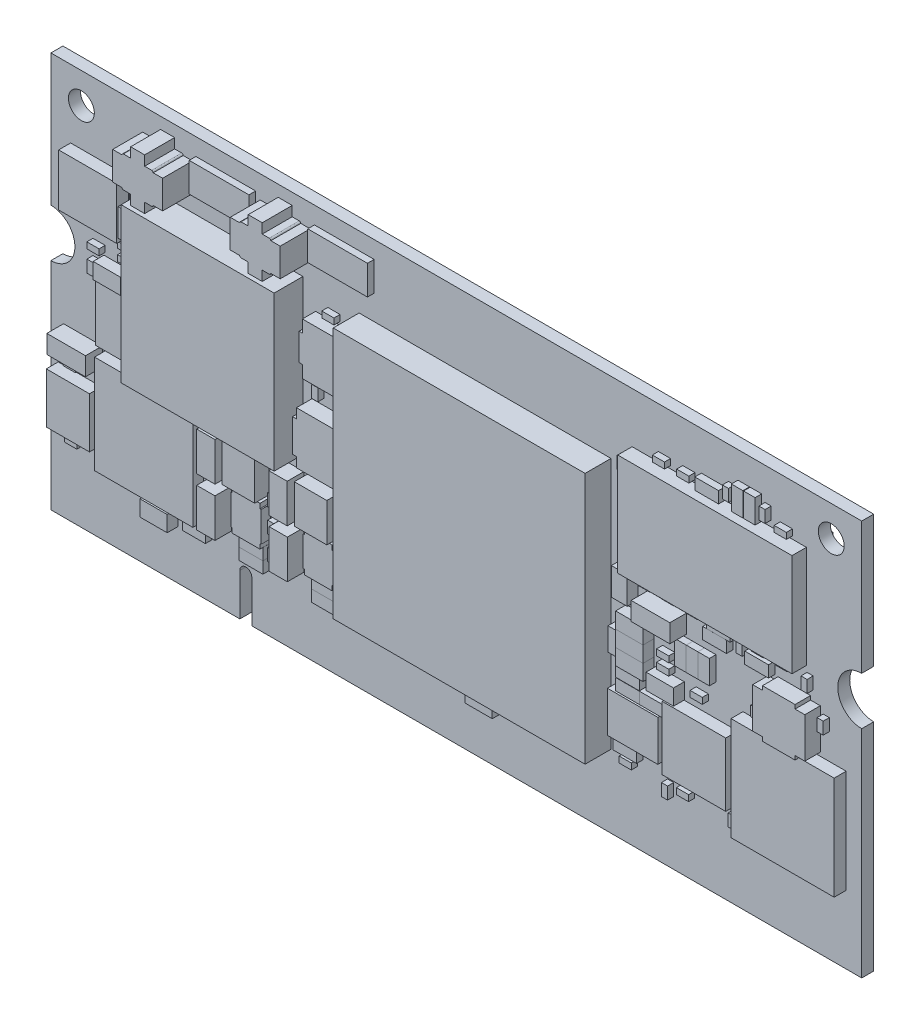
SolidWorks part; units mm, degrees
ref_plane "Front Plane" through (0, 0, 0) normal (0, 0, 1) x (1, 0, 0)
ref_plane "Top Plane" through (0, 0, 0) normal (0, 1, 0) x (1, 0, 0)
ref_plane "Right Plane" through (0, 0, 0) normal (1, 0, 0) x (0, 0, -1)
sketch "Sketch1" plane through (0, 0, 0) normal (0, 0, 1) x (1, 0, 0)
  line L0 (75.7187, 28.0088) -> (75.7187, 10.0079)
  line L1 (75.7187, 10.0079) -> (24.8679, 10.0079)
  line L2 (24.8679, 10.0079) -> (24.8679, 13.508)
  line L3 (23.8697, 13.508) -> (23.8697, 10.0079)
  line L4 (23.8697, 10.0079) -> (8.1191, 10.0079)
  line L5 (8.1191, 10.0079) -> (8.1191, 28.0088)
  line L6 (8.1191, 32.0068) -> (8.1186, 43.0019)
  line L7 (8.1186, 43.0019) -> (75.7187, 43.0019)
  line L8 (75.7187, 43.0019) -> (75.7187, 32.0068)
  arc A0 (75.7187, 32.0068) -> (73.7197, 30.0078) centre (75.7187, 30.0078) ccw
  arc A1 (73.7197, 30.0078) -> (75.7187, 28.0088) centre (75.7187, 30.0078) ccw
  arc A2 (24.8679, 13.508) -> (24.37, 14.0084) centre (24.3688, 13.5092) ccw
  arc A3 (24.37, 14.0084) -> (23.8697, 13.508) centre (24.37, 13.508) ccw
  arc A4 (8.1191, 28.0088) -> (10.1181, 30.0078) centre (8.1191, 30.0078) ccw
  arc A5 (10.1181, 30.0078) -> (8.1191, 32.0068) centre (8.1191, 30.0078) ccw
extrude "BOARD" add sketch "Sketch1" along normal blind 1 separate body
ref_plane "Plane1" through (0, 0, 1) normal (0, 0, 1) x (1, 0, 0)
sketch "Sketch2" plane through (0, 0, 0) normal (0, 0, 1) x (1, 0, 0)
  line L0 (65.8787, 39.0401) -> (65.8787, 39.5481)
  line L1 (65.8787, 39.5481) -> (64.8627, 39.5481)
  line L2 (64.8627, 39.5481) -> (64.8627, 39.0401)
  line L3 (64.8627, 39.0401) -> (65.8787, 39.0401)
extrude "C0402_S-1" add sketch "Sketch2" against normal blind 0.508 separate body
sketch "Sketch3" plane through (0, 0, 0) normal (0, 0, 1) x (1, 0, 0)
  line L0 (67.9107, 39.0401) -> (67.9107, 39.5481)
  line L1 (67.9107, 39.5481) -> (66.8947, 39.5481)
  line L2 (66.8947, 39.5481) -> (66.8947, 39.0401)
  line L3 (66.8947, 39.0401) -> (67.9107, 39.0401)
extrude "C0402_S-2" add sketch "Sketch3" against normal blind 0.508 separate body
sketch "Sketch4" plane through (0, 0, 0) normal (0, 0, 1) x (1, 0, 0)
  line L0 (43.5013, 15.4435) -> (43.5013, 15.9515)
  line L1 (43.5013, 15.9515) -> (42.4853, 15.9515)
  line L2 (42.4853, 15.9515) -> (42.4853, 15.4435)
  line L3 (42.4853, 15.4435) -> (43.5013, 15.4435)
extrude "C0402_S-3" add sketch "Sketch4" against normal blind 0.508 separate body
sketch "Sketch5" plane through (0, 0, 0) normal (0, 0, 1) x (1, 0, 0)
  line L0 (48.8353, 17.6787) -> (48.3273, 17.6787)
  line L1 (48.3273, 17.6787) -> (48.3273, 16.6627)
  line L2 (48.3273, 16.6627) -> (48.8353, 16.6627)
  line L3 (48.8353, 16.6627) -> (48.8353, 17.6787)
extrude "C0402_S-4" add sketch "Sketch5" against normal blind 0.508 separate body
sketch "Sketch6" plane through (0, 0, 1) normal (0, 0, 1) x (1, 0, 0)
  line L0 (60.1383, 24.7653) -> (60.1383, 24.2573)
  line L1 (60.1383, 24.2573) -> (59.1223, 24.2573)
  line L2 (59.1223, 24.2573) -> (59.1223, 24.7653)
  line L3 (59.1223, 24.7653) -> (60.1383, 24.7653)
extrude "C0402_S-5" add sketch "Sketch6" along normal blind 0.508 separate body
sketch "Sketch7" plane through (0, 0, 1) normal (0, 0, 1) x (1, 0, 0)
  line L0 (60.1383, 25.7305) -> (60.1383, 25.2225)
  line L1 (60.1383, 25.2225) -> (59.1223, 25.2225)
  line L2 (59.1223, 25.2225) -> (59.1223, 25.7305)
  line L3 (59.1223, 25.7305) -> (60.1383, 25.7305)
extrude "C0402_S-6" add sketch "Sketch7" along normal blind 0.508 separate body
sketch "Sketch8" plane through (0, 0, 0) normal (0, 0, 1) x (1, 0, 0)
  line L0 (34.6779, 32.785) -> (34.1699, 32.785)
  line L1 (34.1699, 32.785) -> (34.1699, 31.769)
  line L2 (34.1699, 31.769) -> (34.6779, 31.769)
  line L3 (34.6779, 31.769) -> (34.6779, 32.785)
extrude "C0402_S-7" add sketch "Sketch8" against normal blind 0.508 separate body
sketch "Sketch9" plane through (0, 0, 1) normal (0, 0, 1) x (1, 0, 0)
  line L0 (15.1768, 37.115) -> (15.6848, 37.115)
  line L1 (15.6848, 37.115) -> (15.6848, 36.099)
  line L2 (15.6848, 36.099) -> (15.1768, 36.099)
  line L3 (15.1768, 36.099) -> (15.1768, 37.115)
extrude "C0402_S-8" add sketch "Sketch9" along normal blind 0.508 separate body
sketch "Sketch10" plane through (0, 0, 0) normal (0, 0, 1) x (1, 0, 0)
  line L0 (38.3451, 39.7259) -> (38.8531, 39.7259)
  line L1 (38.8531, 39.7259) -> (38.8531, 40.7419)
  line L2 (38.8531, 40.7419) -> (38.3451, 40.7419)
  line L3 (38.3451, 40.7419) -> (38.3451, 39.7259)
extrude "C0402_S-9" add sketch "Sketch10" against normal blind 0.508 separate body
sketch "Sketch11" plane through (0, 0, 0) normal (0, 0, 1) x (1, 0, 0)
  line L0 (14.7231, 22.9619) -> (14.2151, 22.9619)
  line L1 (14.2151, 22.9619) -> (14.2151, 21.9459)
  line L2 (14.2151, 21.9459) -> (14.7231, 21.9459)
  line L3 (14.7231, 21.9459) -> (14.7231, 22.9619)
extrude "C0402_S-10" add sketch "Sketch11" against normal blind 0.508 separate body
sketch "Sketch12" plane through (0, 0, 0) normal (0, 0, 1) x (1, 0, 0)
  line L0 (16.0947, 20.6124) -> (16.0947, 20.1044)
  line L1 (16.0947, 20.1044) -> (17.1107, 20.1044)
  line L2 (17.1107, 20.1044) -> (17.1107, 20.6124)
  line L3 (17.1107, 20.6124) -> (16.0947, 20.6124)
extrude "C0402_S-11" add sketch "Sketch12" against normal blind 0.508 separate body
sketch "Sketch13" plane through (0, 0, 1) normal (0, 0, 1) x (1, 0, 0)
  line L0 (15.2057, 32.6901) -> (15.2057, 32.1821)
  line L1 (15.2057, 32.1821) -> (14.1897, 32.1821)
  line L2 (14.1897, 32.1821) -> (14.1897, 32.6901)
  line L3 (14.1897, 32.6901) -> (15.2057, 32.6901)
extrude "C0402_S-12" add sketch "Sketch13" along normal blind 0.508 separate body
sketch "Sketch14" plane through (0, 0, 0) normal (0, 0, 1) x (1, 0, 0)
  line L0 (65.9549, 27.9149) -> (65.9549, 28.4229)
  line L1 (65.9549, 28.4229) -> (64.9389, 28.4229)
  line L2 (64.9389, 28.4229) -> (64.9389, 27.9149)
  line L3 (64.9389, 27.9149) -> (65.9549, 27.9149)
extrude "C0402_S-13" add sketch "Sketch14" against normal blind 0.508 separate body
sketch "Sketch15" plane through (0, 0, 0) normal (0, 0, 1) x (1, 0, 0)
  line L0 (71.7715, 16.6373) -> (71.7715, 17.1453)
  line L1 (71.7715, 17.1453) -> (70.7555, 17.1453)
  line L2 (70.7555, 17.1453) -> (70.7555, 16.6373)
  line L3 (70.7555, 16.6373) -> (71.7715, 16.6373)
extrude "C0402_S-14" add sketch "Sketch15" against normal blind 0.508 separate body
sketch "Sketch16" plane through (0, 0, 1) normal (0, 0, 1) x (1, 0, 0)
  line L0 (65.0913, 16.8659) -> (65.5993, 16.8659)
  line L1 (65.5993, 16.8659) -> (65.5993, 15.8499)
  line L2 (65.5993, 15.8499) -> (65.0913, 15.8499)
  line L3 (65.0913, 15.8499) -> (65.0913, 16.8659)
extrude "C0402_S-15" add sketch "Sketch16" along normal blind 0.508 separate body
sketch "Sketch17" plane through (0, 0, 0) normal (0, 0, 1) x (1, 0, 0)
  line L0 (72.0001, 23.6477) -> (71.4921, 23.6477)
  line L1 (71.4921, 23.6477) -> (71.4921, 22.6317)
  line L2 (71.4921, 22.6317) -> (72.0001, 22.6317)
  line L3 (72.0001, 22.6317) -> (72.0001, 23.6477)
extrude "C0402_S-16" add sketch "Sketch17" against normal blind 0.508 separate body
sketch "Sketch18" plane through (0, 0, 0) normal (0, 0, 1) x (1, 0, 0)
  line L0 (13.4556, 17.163) -> (13.4556, 16.655)
  line L1 (13.4556, 16.655) -> (14.4717, 16.655)
  line L2 (14.4717, 16.655) -> (14.4717, 17.163)
  line L3 (14.4717, 17.163) -> (13.4556, 17.163)
extrude "C0402_S-17" add sketch "Sketch18" against normal blind 0.508 separate body
sketch "Sketch19" plane through (0, 0, 1) normal (0, 0, 1) x (1, 0, 0)
  line L0 (61.9163, 23.6223) -> (61.9163, 24.1303)
  line L1 (61.9163, 24.1303) -> (62.9323, 24.1303)
  line L2 (62.9323, 24.1303) -> (62.9323, 23.6223)
  line L3 (62.9323, 23.6223) -> (61.9163, 23.6223)
extrude "C0402_S-18" add sketch "Sketch19" along normal blind 0.508 separate body
sketch "Sketch20" plane through (0, 0, 1) normal (0, 0, 1) x (1, 0, 0)
  line L0 (59.5287, 16.2817) -> (60.0367, 16.2817)
  line L1 (60.0367, 16.2817) -> (60.0367, 15.2657)
  line L2 (60.0367, 15.2657) -> (59.5287, 15.2657)
  line L3 (59.5287, 15.2657) -> (59.5287, 16.2817)
extrude "C0402_S-19" add sketch "Sketch20" along normal blind 0.508 separate body
sketch "Sketch21" plane through (0, 0, 1) normal (0, 0, 1) x (1, 0, 0)
  line L0 (11.6243, 30.8613) -> (11.6243, 31.3693)
  line L1 (11.6243, 31.3693) -> (12.6403, 31.3693)
  line L2 (12.6403, 31.3693) -> (12.6403, 30.8613)
  line L3 (12.6403, 30.8613) -> (11.6243, 30.8613)
extrude "C0402_S-20" add sketch "Sketch21" along normal blind 0.508 separate body
sketch "Sketch22" plane through (0, 0, 1) normal (0, 0, 1) x (1, 0, 0)
  line L0 (15.5867, 26.7465) -> (15.0787, 26.7465)
  line L1 (15.0787, 26.7465) -> (15.0787, 27.7625)
  line L2 (15.0787, 27.7625) -> (15.5867, 27.7625)
  line L3 (15.5867, 27.7625) -> (15.5867, 26.7465)
extrude "C0402_S-21" add sketch "Sketch22" along normal blind 0.508 separate body
sketch "Sketch23" plane through (0, 0, 1) normal (0, 0, 1) x (1, 0, 0)
  line L0 (65.7517, 29.7691) -> (66.2597, 29.7691)
  line L1 (66.2597, 29.7691) -> (66.2597, 28.7531)
  line L2 (66.2597, 28.7531) -> (65.7517, 28.7531)
  line L3 (65.7517, 28.7531) -> (65.7517, 29.7691)
extrude "C0402_S-22" add sketch "Sketch23" along normal blind 0.508 separate body
sketch "Sketch24" plane through (0, 0, 1) normal (0, 0, 1) x (1, 0, 0)
  line L0 (68.9775, 29.5151) -> (68.9775, 30.0231)
  line L1 (68.9775, 30.0231) -> (69.9935, 30.0231)
  line L2 (69.9935, 30.0231) -> (69.9935, 29.5151)
  line L3 (69.9935, 29.5151) -> (68.9775, 29.5151)
extrude "C0402_S-23" add sketch "Sketch24" along normal blind 0.508 separate body
sketch "Sketch25" plane through (0, 0, 1) normal (0, 0, 1) x (1, 0, 0)
  line L0 (61.5099, 29.5405) -> (61.5099, 30.0485)
  line L1 (61.5099, 30.0485) -> (62.5259, 30.0485)
  line L2 (62.5259, 30.0485) -> (62.5259, 29.5405)
  line L3 (62.5259, 29.5405) -> (61.5099, 29.5405)
extrude "C0402_S-24" add sketch "Sketch25" along normal blind 0.508 separate body
sketch "Sketch26" plane through (0, 0, 1) normal (0, 0, 1) x (1, 0, 0)
  line L0 (60.5447, 30.0485) -> (60.5447, 29.5405)
  line L1 (60.5447, 29.5405) -> (59.5287, 29.5405)
  line L2 (59.5287, 29.5405) -> (59.5287, 30.0485)
  line L3 (59.5287, 30.0485) -> (60.5447, 30.0485)
extrude "C0402_S-25" add sketch "Sketch26" along normal blind 0.508 separate body
sketch "Sketch27" plane through (0, 0, 1) normal (0, 0, 1) x (1, 0, 0)
  line L0 (68.1647, 39.2941) -> (67.6567, 39.2941)
  line L1 (67.6567, 39.2941) -> (67.6567, 40.3101)
  line L2 (67.6567, 40.3101) -> (68.1647, 40.3101)
  line L3 (68.1647, 40.3101) -> (68.1647, 39.2941)
extrude "C0402_S-26" add sketch "Sketch27" along normal blind 0.508 separate body
sketch "Sketch28" plane through (0, 0, 1) normal (0, 0, 1) x (1, 0, 0)
  line L0 (68.0123, 30.0231) -> (68.0123, 29.5151)
  line L1 (68.0123, 29.5151) -> (66.9963, 29.5151)
  line L2 (66.9963, 29.5151) -> (66.9963, 30.0231)
  line L3 (66.9963, 30.0231) -> (68.0123, 30.0231)
extrude "C0402_S-27" add sketch "Sketch28" along normal blind 0.508 separate body
sketch "Sketch29" plane through (0, 0, 1) normal (0, 0, 1) x (1, 0, 0)
  line L0 (65.1167, 39.2941) -> (64.6087, 39.2941)
  line L1 (64.6087, 39.2941) -> (64.6087, 40.3101)
  line L2 (64.6087, 40.3101) -> (65.1167, 40.3101)
  line L3 (65.1167, 40.3101) -> (65.1167, 39.2941)
extrude "C0402_S-28" add sketch "Sketch29" along normal blind 0.508 separate body
sketch "Sketch30" plane through (0, 0, 1) normal (0, 0, 1) x (1, 0, 0)
  line L0 (56.3283, 37.0335) -> (55.8203, 37.0335)
  line L1 (55.8203, 37.0335) -> (55.8203, 38.0495)
  line L2 (55.8203, 38.0495) -> (56.3283, 38.0495)
  line L3 (56.3283, 38.0495) -> (56.3283, 37.0335)
extrude "C0402_S-29" add sketch "Sketch30" along normal blind 0.508 separate body
sketch "Sketch31" plane through (0, 0, 1) normal (0, 0, 1) x (1, 0, 0)
  line L0 (61.8147, 39.5481) -> (61.8147, 39.0401)
  line L1 (61.8147, 39.0401) -> (60.7987, 39.0401)
  line L2 (60.7987, 39.0401) -> (60.7987, 39.5481)
  line L3 (60.7987, 39.5481) -> (61.8147, 39.5481)
extrude "C0402_S-30" add sketch "Sketch31" along normal blind 0.508 separate body
sketch "Sketch32" plane through (0, 0, 1) normal (0, 0, 1) x (1, 0, 0)
  line L0 (57.5475, 29.5405) -> (57.5475, 30.0485)
  line L1 (57.5475, 30.0485) -> (58.5635, 30.0485)
  line L2 (58.5635, 30.0485) -> (58.5635, 29.5405)
  line L3 (58.5635, 29.5405) -> (57.5475, 29.5405)
extrude "C0402_S-31" add sketch "Sketch32" along normal blind 0.508 separate body
sketch "Sketch33" plane through (0, 0, 1) normal (0, 0, 1) x (1, 0, 0)
  line L0 (68.9267, 39.0401) -> (68.9267, 39.5481)
  line L1 (68.9267, 39.5481) -> (69.9427, 39.5481)
  line L2 (69.9427, 39.5481) -> (69.9427, 39.0401)
  line L3 (69.9427, 39.0401) -> (68.9267, 39.0401)
extrude "C0402_S-32" add sketch "Sketch33" along normal blind 0.508 separate body
sketch "Sketch34" plane through (0, 0, 1) normal (0, 0, 1) x (1, 0, 0)
  line L0 (59.7827, 39.5481) -> (59.7827, 39.0401)
  line L1 (59.7827, 39.0401) -> (58.7667, 39.0401)
  line L2 (58.7667, 39.0401) -> (58.7667, 39.5481)
  line L3 (58.7667, 39.5481) -> (59.7827, 39.5481)
extrude "C0402_S-33" add sketch "Sketch34" along normal blind 0.508 separate body
sketch "Sketch35" plane through (0, 0, 0) normal (0, 0, 1) x (1, 0, 0)
  line L0 (19.2951, 22.9619) -> (18.7871, 22.9619)
  line L1 (18.7871, 22.9619) -> (18.7871, 21.9459)
  line L2 (18.7871, 21.9459) -> (19.2951, 21.9459)
  line L3 (19.2951, 21.9459) -> (19.2951, 22.9619)
extrude "C0402_S-34" add sketch "Sketch35" against normal blind 0.508 separate body
sketch "Sketch36" plane through (0, 0, 0) normal (0, 0, 1) x (1, 0, 0)
  line L0 (17.2631, 22.9619) -> (16.7551, 22.9619)
  line L1 (16.7551, 22.9619) -> (16.7551, 21.9459)
  line L2 (16.7551, 21.9459) -> (17.2631, 21.9459)
  line L3 (17.2631, 21.9459) -> (17.2631, 22.9619)
extrude "C0402_S-35" add sketch "Sketch36" against normal blind 0.508 separate body
sketch "Sketch37" plane through (0, 0, 0) normal (0, 0, 1) x (1, 0, 0)
  line L0 (15.7391, 22.9619) -> (15.2311, 22.9619)
  line L1 (15.2311, 22.9619) -> (15.2311, 21.9459)
  line L2 (15.2311, 21.9459) -> (15.7391, 21.9459)
  line L3 (15.7391, 21.9459) -> (15.7391, 22.9619)
extrude "C0402_S-36" add sketch "Sketch37" against normal blind 0.508 separate body
sketch "Sketch38" plane through (0, 0, 0) normal (0, 0, 1) x (1, 0, 0)
  line L0 (20.0571, 20.6759) -> (20.0571, 21.1839)
  line L1 (20.0571, 21.1839) -> (19.0411, 21.1839)
  line L2 (19.0411, 21.1839) -> (19.0411, 20.6759)
  line L3 (19.0411, 20.6759) -> (20.0571, 20.6759)
extrude "C0402_S-37" add sketch "Sketch38" against normal blind 0.508 separate body
sketch "Sketch39" plane through (0, 0, 0) normal (0, 0, 1) x (1, 0, 0)
  line L0 (13.2499, 20.9502) -> (13.7579, 20.9502)
  line L1 (13.7579, 20.9502) -> (13.7579, 21.9662)
  line L2 (13.7579, 21.9662) -> (13.2499, 21.9662)
  line L3 (13.2499, 21.9662) -> (13.2499, 20.9502)
extrude "C0402_S-38" add sketch "Sketch39" against normal blind 0.508 separate body
sketch "Sketch40" plane through (0, 0, 0) normal (0, 0, 1) x (1, 0, 0)
  line L0 (14.2151, 19.9342) -> (14.7231, 19.9342)
  line L1 (14.7231, 19.9342) -> (14.7231, 20.9502)
  line L2 (14.7231, 20.9502) -> (14.2151, 20.9502)
  line L3 (14.2151, 20.9502) -> (14.2151, 19.9342)
extrude "C0402_S-39" add sketch "Sketch40" against normal blind 0.508 separate body
sketch "Sketch41" plane through (0, 0, 0) normal (0, 0, 1) x (1, 0, 0)
  line L0 (20.0571, 18.6439) -> (20.0571, 19.1519)
  line L1 (20.0571, 19.1519) -> (19.0411, 19.1519)
  line L2 (19.0411, 19.1519) -> (19.0411, 18.6439)
  line L3 (19.0411, 18.6439) -> (20.0571, 18.6439)
extrude "C0402_S-40" add sketch "Sketch41" against normal blind 0.508 separate body
sketch "Sketch42" plane through (0, 0, 0) normal (0, 0, 1) x (1, 0, 0)
  line L0 (20.0571, 19.6599) -> (20.0571, 20.1679)
  line L1 (20.0571, 20.1679) -> (19.0411, 20.1679)
  line L2 (19.0411, 20.1679) -> (19.0411, 19.6599)
  line L3 (19.0411, 19.6599) -> (20.0571, 19.6599)
extrude "C0402_S-41" add sketch "Sketch42" against normal blind 0.508 separate body
sketch "Sketch43" plane through (0, 0, 0) normal (0, 0, 1) x (1, 0, 0)
  line L0 (16.9939, 17.5288) -> (17.5019, 17.5288)
  line L1 (17.5019, 17.5288) -> (17.5019, 18.5448)
  line L2 (17.5019, 18.5448) -> (16.9939, 18.5448)
  line L3 (16.9939, 18.5448) -> (16.9939, 17.5288)
extrude "C0402_S-42" add sketch "Sketch43" against normal blind 0.508 separate body
sketch "Sketch44" plane through (0, 0, 1) normal (0, 0, 1) x (1, 0, 0)
  line L0 (29.9631, 23.8001) -> (29.9631, 24.3081)
  line L1 (29.9631, 24.3081) -> (30.9791, 24.3081)
  line L2 (30.9791, 24.3081) -> (30.9791, 23.8001)
  line L3 (30.9791, 23.8001) -> (29.9631, 23.8001)
extrude "C0402_S-43" add sketch "Sketch44" along normal blind 0.508 separate body
sketch "Sketch45" plane through (0, 0, 0) normal (0, 0, 1) x (1, 0, 0)
  line L0 (70.5269, 26.5941) -> (71.0349, 26.5941)
  line L1 (71.0349, 26.5941) -> (71.0349, 27.6101)
  line L2 (71.0349, 27.6101) -> (70.5269, 27.6101)
  line L3 (70.5269, 27.6101) -> (70.5269, 26.5941)
extrude "C0402_S-44" add sketch "Sketch45" against normal blind 0.508 separate body
sketch "Sketch46" plane through (0, 0, 0) normal (0, 0, 1) x (1, 0, 0)
  line L0 (13.4531, 19.1265) -> (13.4531, 18.6185)
  line L1 (13.4531, 18.6185) -> (14.4691, 18.6185)
  line L2 (14.4691, 18.6185) -> (14.4691, 19.1265)
  line L3 (14.4691, 19.1265) -> (13.4531, 19.1265)
extrude "C0402_S-45" add sketch "Sketch46" against normal blind 0.508 separate body
sketch "Sketch47" plane through (0, 0, 0) normal (0, 0, 1) x (1, 0, 0)
  line L0 (13.4531, 18.1613) -> (13.4531, 17.6533)
  line L1 (13.4531, 17.6533) -> (14.4691, 17.6533)
  line L2 (14.4691, 17.6533) -> (14.4691, 18.1613)
  line L3 (14.4691, 18.1613) -> (13.4531, 18.1613)
extrude "C0402_S-46" add sketch "Sketch47" against normal blind 0.508 separate body
sketch "Sketch48" plane through (0, 0, 1) normal (0, 0, 1) x (1, 0, 0)
  line L0 (9.6431, 21.4379) -> (9.6431, 21.9459)
  line L1 (9.6431, 21.9459) -> (10.6591, 21.9459)
  line L2 (10.6591, 21.9459) -> (10.6591, 21.4379)
  line L3 (10.6591, 21.4379) -> (9.6431, 21.4379)
extrude "C0402_S-47" add sketch "Sketch48" along normal blind 0.508 separate body
sketch "Sketch49" plane through (0, 0, 1) normal (0, 0, 1) x (1, 0, 0)
  line L0 (10.7861, 16.4849) -> (10.7861, 15.9769)
  line L1 (10.7861, 15.9769) -> (9.7701, 15.9769)
  line L2 (9.7701, 15.9769) -> (9.7701, 16.4849)
  line L3 (9.7701, 16.4849) -> (10.7861, 16.4849)
extrude "C0402_S-48" add sketch "Sketch49" along normal blind 0.508 separate body
sketch "Sketch50" plane through (0, 0, 1) normal (0, 0, 1) x (1, 0, 0)
  line L0 (27.2064, 17.7963) -> (26.6984, 17.7963)
  line L1 (26.6984, 17.7963) -> (26.6984, 18.8123)
  line L2 (26.6984, 18.8123) -> (27.2064, 18.8123)
  line L3 (27.2064, 18.8123) -> (27.2064, 17.7963)
extrude "C0402_S-49" add sketch "Sketch50" along normal blind 0.508 separate body
sketch "Sketch51" plane through (0, 0, 1) normal (0, 0, 1) x (1, 0, 0)
  line L0 (33.2262, 17.7963) -> (32.7182, 17.7963)
  line L1 (32.7182, 17.7963) -> (32.7182, 18.8123)
  line L2 (32.7182, 18.8123) -> (33.2262, 18.8123)
  line L3 (33.2262, 18.8123) -> (33.2262, 17.7963)
extrude "C0402_S-50" add sketch "Sketch51" along normal blind 0.508 separate body
sketch "Sketch52" plane through (0, 0, 1) normal (0, 0, 1) x (1, 0, 0)
  line L0 (32.9857, 24.3081) -> (32.9857, 23.8001)
  line L1 (32.9857, 23.8001) -> (31.9697, 23.8001)
  line L2 (31.9697, 23.8001) -> (31.9697, 24.3081)
  line L3 (31.9697, 24.3081) -> (32.9857, 24.3081)
extrude "C0402_S-51" add sketch "Sketch52" along normal blind 0.508 separate body
sketch "Sketch53" plane through (0, 0, 1) normal (0, 0, 1) x (1, 0, 0)
  line L0 (30.8775, 29.4389) -> (30.3695, 29.4389)
  line L1 (30.3695, 29.4389) -> (30.3695, 30.4549)
  line L2 (30.3695, 30.4549) -> (30.8775, 30.4549)
  line L3 (30.8775, 30.4549) -> (30.8775, 29.4389)
extrude "C0402_S-52" add sketch "Sketch53" along normal blind 0.508 separate body
sketch "Sketch54" plane through (0, 0, 0) normal (0, 0, 1) x (1, 0, 0)
  line L0 (70.7809, 25.8575) -> (70.7809, 25.3495)
  line L1 (70.7809, 25.3495) -> (71.7969, 25.3495)
  line L2 (71.7969, 25.3495) -> (71.7969, 25.8575)
  line L3 (71.7969, 25.8575) -> (70.7809, 25.8575)
extrude "C0402_S-53" add sketch "Sketch54" against normal blind 0.508 separate body
sketch "Sketch55" plane through (0, 0, 1) normal (0, 0, 1) x (1, 0, 0)
  line L0 (73.0161, 26.4417) -> (72.5081, 26.4417)
  line L1 (72.5081, 26.4417) -> (72.5081, 27.4577)
  line L2 (72.5081, 27.4577) -> (73.0161, 27.4577)
  line L3 (73.0161, 27.4577) -> (73.0161, 26.4417)
extrude "C0402_S-54" add sketch "Sketch55" along normal blind 0.508 separate body
sketch "Sketch56" plane through (0, 0, 0) normal (0, 0, 1) x (1, 0, 0)
  line L0 (66.9455, 28.4229) -> (66.9455, 27.9149)
  line L1 (66.9455, 27.9149) -> (67.9615, 27.9149)
  line L2 (67.9615, 27.9149) -> (67.9615, 28.4229)
  line L3 (67.9615, 28.4229) -> (66.9455, 28.4229)
extrude "C0402_S-55" add sketch "Sketch56" against normal blind 0.508 separate body
sketch "Sketch57" plane through (0, 0, 1) normal (0, 0, 1) x (1, 0, 0)
  line L0 (61.7893, 16.5357) -> (61.7893, 16.0277)
  line L1 (61.7893, 16.0277) -> (60.7733, 16.0277)
  line L2 (60.7733, 16.0277) -> (60.7733, 16.5357)
  line L3 (60.7733, 16.5357) -> (61.7893, 16.5357)
extrude "C0402_S-56" add sketch "Sketch57" along normal blind 0.508 separate body
sketch "Sketch58" plane through (0, 0, 0) normal (0, 0, 1) x (1, 0, 0)
  line L0 (67.9107, 40.0561) -> (67.9107, 40.5641)
  line L1 (67.9107, 40.5641) -> (66.8947, 40.5641)
  line L2 (66.8947, 40.5641) -> (66.8947, 40.0561)
  line L3 (66.8947, 40.0561) -> (67.9107, 40.0561)
extrude "R0402_S-1" add sketch "Sketch58" against normal blind 0.508 separate body
sketch "Sketch59" plane through (0, 0, 0) normal (0, 0, 1) x (1, 0, 0)
  line L0 (65.8787, 40.0561) -> (65.8787, 40.5641)
  line L1 (65.8787, 40.5641) -> (64.8627, 40.5641)
  line L2 (64.8627, 40.5641) -> (64.8627, 40.0561)
  line L3 (64.8627, 40.0561) -> (65.8787, 40.0561)
extrude "R0402_S-2" add sketch "Sketch59" against normal blind 0.508 separate body
sketch "Sketch60" plane through (0, 0, 0) normal (0, 0, 1) x (1, 0, 0)
  line L0 (11.444, 18.8953) -> (11.952, 18.8953)
  line L1 (11.952, 18.8953) -> (11.952, 19.9113)
  line L2 (11.952, 19.9113) -> (11.444, 19.9113)
  line L3 (11.444, 19.9113) -> (11.444, 18.8953)
extrude "R0402_S-3" add sketch "Sketch60" against normal blind 0.508 separate body
sketch "Sketch61" plane through (0, 0, 0) normal (0, 0, 1) x (1, 0, 0)
  line L0 (39.9961, 16.9929) -> (39.9961, 17.5009)
  line L1 (39.9961, 17.5009) -> (38.9801, 17.5009)
  line L2 (38.9801, 17.5009) -> (38.9801, 16.9929)
  line L3 (38.9801, 16.9929) -> (39.9961, 16.9929)
extrude "R0402_S-4" add sketch "Sketch61" against normal blind 0.508 separate body
sketch "Sketch62" plane through (0, 0, 0) normal (0, 0, 1) x (1, 0, 0)
  line L0 (36.1353, 15.0879) -> (36.6433, 15.0879)
  line L1 (36.6433, 15.0879) -> (36.6433, 16.1039)
  line L2 (36.6433, 16.1039) -> (36.1353, 16.1039)
  line L3 (36.1353, 16.1039) -> (36.1353, 15.0879)
extrude "R0402_S-5" add sketch "Sketch62" against normal blind 0.508 separate body
sketch "Sketch63" plane through (0, 0, 0) normal (0, 0, 1) x (1, 0, 0)
  line L0 (39.8437, 15.7254) -> (39.8437, 15.2174)
  line L1 (39.8437, 15.2174) -> (40.8597, 15.2174)
  line L2 (40.8597, 15.2174) -> (40.8597, 15.7254)
  line L3 (40.8597, 15.7254) -> (39.8437, 15.7254)
extrude "R0402_S-6" add sketch "Sketch63" against normal blind 0.508 separate body
sketch "Sketch64" plane through (0, 0, 0) normal (0, 0, 1) x (1, 0, 0)
  line L0 (20.7429, 23.1143) -> (20.7429, 22.6063)
  line L1 (20.7429, 22.6063) -> (21.7589, 22.6063)
  line L2 (21.7589, 22.6063) -> (21.7589, 23.1143)
  line L3 (21.7589, 23.1143) -> (20.7429, 23.1143)
extrude "R0402_S-7" add sketch "Sketch64" against normal blind 0.508 separate body
sketch "Sketch65" plane through (0, 0, 0) normal (0, 0, 1) x (1, 0, 0)
  line L0 (15.9931, 24.4859) -> (15.9931, 24.9939)
  line L1 (15.9931, 24.9939) -> (14.9771, 24.9939)
  line L2 (14.9771, 24.9939) -> (14.9771, 24.4859)
  line L3 (14.9771, 24.4859) -> (15.9931, 24.4859)
extrude "R0402_S-8" add sketch "Sketch65" against normal blind 0.508 separate body
sketch "Sketch66" plane through (0, 0, 1) normal (0, 0, 1) x (1, 0, 0)
  line L0 (57.0141, 16.4341) -> (57.0141, 15.9261)
  line L1 (57.0141, 15.9261) -> (55.9981, 15.9261)
  line L2 (55.9981, 15.9261) -> (55.9981, 16.4341)
  line L3 (55.9981, 16.4341) -> (57.0141, 16.4341)
extrude "R0402_S-9" add sketch "Sketch66" along normal blind 0.508 separate body
sketch "Sketch67" plane through (0, 0, 0) normal (0, 0, 1) x (1, 0, 0)
  line L0 (12.0332, 15.3901) -> (12.0332, 14.8821)
  line L1 (12.0332, 14.8821) -> (13.0493, 14.8821)
  line L2 (13.0493, 14.8821) -> (13.0493, 15.3901)
  line L3 (13.0493, 15.3901) -> (12.0332, 15.3901)
extrude "R0402_S-10" add sketch "Sketch67" against normal blind 0.508 separate body
sketch "Sketch68" plane through (0, 0, 1) normal (0, 0, 1) x (1, 0, 0)
  line L0 (27.2064, 15.8151) -> (26.6984, 15.8151)
  line L1 (26.6984, 15.8151) -> (26.6984, 16.8311)
  line L2 (26.6984, 16.8311) -> (27.2064, 16.8311)
  line L3 (27.2064, 16.8311) -> (27.2064, 15.8151)
extrude "R0402_S-11" add sketch "Sketch68" along normal blind 0.508 separate body
sketch "Sketch69" plane through (0, 0, 1) normal (0, 0, 1) x (1, 0, 0)
  line L0 (26.6984, 20.7935) -> (27.2064, 20.7935)
  line L1 (27.2064, 20.7935) -> (27.2064, 19.7775)
  line L2 (27.2064, 19.7775) -> (26.6984, 19.7775)
  line L3 (26.6984, 19.7775) -> (26.6984, 20.7935)
extrude "R0402_S-12" add sketch "Sketch69" along normal blind 0.508 separate body
sketch "Sketch70" plane through (0, 0, 1) normal (0, 0, 1) x (1, 0, 0)
  line L0 (32.7182, 20.7935) -> (33.2262, 20.7935)
  line L1 (33.2262, 20.7935) -> (33.2262, 19.7775)
  line L2 (33.2262, 19.7775) -> (32.7182, 19.7775)
  line L3 (32.7182, 19.7775) -> (32.7182, 20.7935)
extrude "R0402_S-13" add sketch "Sketch70" along normal blind 0.508 separate body
sketch "Sketch71" plane through (0, 0, 1) normal (0, 0, 1) x (1, 0, 0)
  line L0 (71.1619, 29.7945) -> (71.6699, 29.7945)
  line L1 (71.6699, 29.7945) -> (71.6699, 28.7785)
  line L2 (71.6699, 28.7785) -> (71.1619, 28.7785)
  line L3 (71.1619, 28.7785) -> (71.1619, 29.7945)
extrude "R0402_S-14" add sketch "Sketch71" along normal blind 0.508 separate body
sketch "Sketch72" plane through (0, 0, 1) normal (0, 0, 1) x (1, 0, 0)
  line L0 (32.2237, 36.1699) -> (32.2237, 35.6619)
  line L1 (32.2237, 35.6619) -> (31.2077, 35.6619)
  line L2 (31.2077, 35.6619) -> (31.2077, 36.1699)
  line L3 (31.2077, 36.1699) -> (32.2237, 36.1699)
extrude "R0402_S-15" add sketch "Sketch72" along normal blind 0.508 separate body
sketch "Sketch73" plane through (0, 0, 0) normal (0, 0, 1) x (1, 0, 0)
  line L0 (55.4393, 20.8029) -> (55.9473, 20.8029)
  line L1 (55.9473, 20.8029) -> (55.9473, 21.8189)
  line L2 (55.9473, 21.8189) -> (55.4393, 21.8189)
  line L3 (55.4393, 21.8189) -> (55.4393, 20.8029)
extrude "R0402_S-16" add sketch "Sketch73" against normal blind 0.508 separate body
sketch "Sketch74" plane through (0, 0, 1) normal (0, 0, 1) x (1, 0, 0)
  line L0 (15.2057, 31.7249) -> (15.2057, 31.2169)
  line L1 (15.2057, 31.2169) -> (14.1897, 31.2169)
  line L2 (14.1897, 31.2169) -> (14.1897, 31.7249)
  line L3 (14.1897, 31.7249) -> (15.2057, 31.7249)
extrude "R0402_S-17" add sketch "Sketch74" along normal blind 0.508 separate body
sketch "Sketch75" plane through (0, 0, 1) normal (0, 0, 1) x (1, 0, 0)
  line L0 (15.0787, 30.1247) -> (15.5867, 30.1247)
  line L1 (15.5867, 30.1247) -> (15.5867, 29.1087)
  line L2 (15.5867, 29.1087) -> (15.0787, 29.1087)
  line L3 (15.0787, 29.1087) -> (15.0787, 30.1247)
extrude "R0402_S-18" add sketch "Sketch75" along normal blind 0.508 separate body
sketch "Sketch76" plane through (0, 0, 0) normal (0, 0, 1) x (1, 0, 0)
  line L0 (71.0349, 23.6477) -> (70.5269, 23.6477)
  line L1 (70.5269, 23.6477) -> (70.5269, 22.6317)
  line L2 (70.5269, 22.6317) -> (71.0349, 22.6317)
  line L3 (71.0349, 22.6317) -> (71.0349, 23.6477)
extrude "R0402_S-19" add sketch "Sketch76" against normal blind 0.508 separate body
sketch "Sketch77" plane through (0, 0, 0) normal (0, 0, 1) x (1, 0, 0)
  line L0 (55.3885, 24.2065) -> (55.3885, 24.7145)
  line L1 (55.3885, 24.7145) -> (54.3725, 24.7145)
  line L2 (54.3725, 24.7145) -> (54.3725, 24.2065)
  line L3 (54.3725, 24.2065) -> (55.3885, 24.2065)
extrude "R0402_S-20" add sketch "Sketch77" against normal blind 0.508 separate body
sketch "Sketch78" plane through (0, 0, 1) normal (0, 0, 1) x (1, 0, 0)
  line L0 (11.6243, 30.1247) -> (12.1323, 30.1247)
  line L1 (12.1323, 30.1247) -> (12.1323, 29.1087)
  line L2 (12.1323, 29.1087) -> (11.6243, 29.1087)
  line L3 (11.6243, 29.1087) -> (11.6243, 30.1247)
extrude "R0402_S-21" add sketch "Sketch78" along normal blind 0.508 separate body
sketch "Sketch79" plane through (0, 0, 0) normal (0, 0, 1) x (1, 0, 0)
  line L0 (52.0611, 15.6213) -> (51.5531, 15.6213)
  line L1 (51.5531, 15.6213) -> (51.5531, 14.6053)
  line L2 (51.5531, 14.6053) -> (52.0611, 14.6053)
  line L3 (52.0611, 14.6053) -> (52.0611, 15.6213)
extrude "R0402_S-22" add sketch "Sketch79" against normal blind 0.508 separate body
sketch "Sketch80" plane through (0, 0, 1) normal (0, 0, 1) x (1, 0, 0)
  line L0 (55.1132, 25.4145) -> (55.1132, 23.5064)
  line L1 (55.1132, 23.5064) -> (56.121, 23.5064)
  line L2 (56.121, 23.5064) -> (56.121, 25.4145)
  line L3 (56.121, 25.4145) -> (55.1132, 25.4145)
extrude "BLM15PD-1" add sketch "Sketch80" along normal blind 0.5499 separate body
sketch "Sketch81" plane through (0, 0, 1) normal (0, 0, 1) x (1, 0, 0)
  line L0 (21.5445, 15.5689) -> (19.6365, 15.5689)
  line L1 (19.6365, 15.5689) -> (19.6365, 14.5611)
  line L2 (19.6365, 14.5611) -> (21.5445, 14.5611)
  line L3 (21.5445, 14.5611) -> (21.5445, 15.5689)
extrude "BLM15PD-2" add sketch "Sketch81" along normal blind 0.5499 separate body
sketch "Sketch82" plane through (0, 0, 0) normal (0, 0, 1) x (1, 0, 0)
  line L0 (18.5875, 18.0302) -> (20.4955, 18.0302)
  line L1 (20.4955, 18.0302) -> (20.4955, 17.0223)
  line L2 (20.4955, 17.0223) -> (18.5875, 17.0223)
  line L3 (18.5875, 17.0223) -> (18.5875, 18.0302)
extrude "BLM15PD-3" add sketch "Sketch82" against normal blind 0.5499 separate body
sketch "Sketch83" plane through (0, 0, 0) normal (0, 0, 1) x (1, 0, 0)
  line L0 (26.8785, 23.9057) -> (24.9705, 23.9057)
  line L1 (24.9705, 23.9057) -> (24.9705, 24.9136)
  line L2 (24.9705, 24.9136) -> (26.8785, 24.9136)
  line L3 (26.8785, 24.9136) -> (26.8785, 23.9057)
extrude "BLM15PD-4" add sketch "Sketch83" against normal blind 0.5499 separate body
sketch "Sketch85" plane through (0, 0, 1) normal (0, 0, 1) x (1, 0, 0)
  line L0 (26.2999, 20.18) -> (23.592, 20.18)
  line L1 (23.592, 20.18) -> (23.592, 23.3881)
  line L2 (23.592, 23.3881) -> (26.2999, 23.3881)
  line L3 (26.2999, 23.3881) -> (26.2999, 20.18)
extrude "VLS252012HBX-1-1" add sketch "Sketch85" along normal blind 1.1999 separate body
sketch "Sketch86" plane through (0, 0, 1) normal (0, 0, 1) x (1, 0, 0)
  line L0 (32.3197, 20.18) -> (29.6118, 20.18)
  line L1 (29.6118, 20.18) -> (29.6118, 23.3881)
  line L2 (29.6118, 23.3881) -> (32.3197, 23.3881)
  line L3 (32.3197, 23.3881) -> (32.3197, 20.18)
extrude "VLS252012HBX-1-2" add sketch "Sketch86" along normal blind 1.1999 separate body
sketch "Sketch87" plane through (0, 0, 0) normal (0, 0, 1) x (1, 0, 0)
  line L0 (71.1055, 38.799) -> (71.1055, 30.2646)
  line L1 (71.1055, 30.2646) -> (56.5767, 30.2646)
  line L2 (56.5767, 30.2646) -> (56.5767, 38.799)
  line L3 (56.5767, 38.799) -> (71.1055, 38.799)
extrude "BGA96_0P8X14-1" add sketch "Sketch87" against normal blind 1.1999 separate body
sketch "Sketch88" plane through (0, 0, 1) normal (0, 0, 1) x (1, 0, 0)
  line L0 (71.1055, 30.2646) -> (71.1055, 38.799)
  line L1 (71.1055, 38.799) -> (56.5767, 38.799)
  line L2 (56.5767, 38.799) -> (56.5767, 30.2646)
  line L3 (56.5767, 30.2646) -> (71.1055, 30.2646)
extrude "BGA96_0P8X14-2" add sketch "Sketch88" along normal blind 1.1999 separate body
sketch "Sketch89" plane through (0, 0, 0) normal (0, 0, 1) x (1, 0, 0)
  line L0 (70.2117, 27.6377) -> (70.2117, 15.238)
  line L1 (70.2117, 15.238) -> (56.2117, 15.238)
  line L2 (56.2117, 15.238) -> (56.2117, 27.6377)
  line L3 (56.2117, 27.6377) -> (70.2117, 27.6377)
extrude "153_WFBGA-1" add sketch "Sketch89" against normal blind 0.8001 separate body
sketch "Sketch90" plane through (0, 0, 0) normal (0, 0, 1) x (1, 0, 0)
  line L0 (40.0035, 40.9639) -> (40.0035, 38.88)
  line L1 (40.0035, 38.88) -> (42.2595, 38.88)
  line L2 (42.2595, 38.88) -> (42.2595, 40.9639)
  line L3 (42.2595, 40.9639) -> (40.0035, 40.9639)
extrude "VSON008X2030-1" add sketch "Sketch90" against normal blind 0.5999 separate body
sketch "Sketch91" plane through (0, 0, 1) normal (0, 0, 1) x (1, 0, 0)
  line L0 (30.1864, 31.0695) -> (30.1864, 32.0944)
  line L1 (30.1864, 32.0944) -> (29.9113, 32.0944)
  line L2 (29.9113, 32.0944) -> (29.9113, 34.3525)
  line L3 (29.9113, 34.3525) -> (30.1864, 34.3525)
  line L4 (30.1864, 34.3525) -> (30.1864, 35.3774)
  line L5 (30.1864, 35.3774) -> (33.1942, 35.3774)
  line L6 (33.1942, 35.3774) -> (33.1942, 34.3525)
  line L7 (33.1942, 34.3525) -> (33.4693, 34.3525)
  line L8 (33.4693, 34.3525) -> (33.4693, 32.0944)
  line L9 (33.4693, 32.0944) -> (33.1942, 32.0944)
  line L10 (33.1942, 32.0944) -> (33.1942, 31.0695)
  line L11 (33.1942, 31.0695) -> (30.1864, 31.0695)
extrude "SOT23-6-1" add sketch "Sketch91" along normal blind 1.1001 separate body
sketch "Sketch97" plane through (0, 0, 1) normal (0, 0, 1) x (1, 0, 0)
  line L0 (55.6044, 28.9969) -> (55.6044, 29.6268)
  line L1 (55.6044, 29.6268) -> (55.5894, 29.6268)
  line L2 (55.5894, 29.6268) -> (55.5894, 29.7289)
  line L3 (55.5894, 29.7289) -> (55.2892, 29.7289)
  line L4 (55.2892, 29.7289) -> (55.2892, 29.6268)
  line L5 (55.2892, 29.6268) -> (55.2742, 29.6268)
  line L6 (55.2742, 29.6268) -> (55.2742, 28.9969)
  line L7 (55.2742, 28.9969) -> (55.2892, 28.9969)
  line L8 (55.2892, 28.9969) -> (55.2892, 28.8948)
  line L9 (55.2892, 28.8948) -> (55.5894, 28.8948)
  line L10 (55.5894, 28.8948) -> (55.5894, 28.9969)
  line L11 (55.5894, 28.9969) -> (55.6044, 28.9969)
extrude "C0201-1" add sketch "Sketch97" along normal blind 0.3299 separate body
sketch "Sketch98" plane through (0, 0, 0) normal (0, 0, 1) x (1, 0, 0)
  line L0 (49.0106, 23.5613) -> (48.3807, 23.5613)
  line L1 (48.3807, 23.5613) -> (48.3807, 23.5763)
  line L2 (48.3807, 23.5763) -> (48.2785, 23.5763)
  line L3 (48.2785, 23.5763) -> (48.2785, 23.8765)
  line L4 (48.2785, 23.8765) -> (48.3807, 23.8765)
  line L5 (48.3807, 23.8765) -> (48.3807, 23.8915)
  line L6 (48.3807, 23.8915) -> (49.0106, 23.8915)
  line L7 (49.0106, 23.8915) -> (49.0106, 23.8765)
  line L8 (49.0106, 23.8765) -> (49.1127, 23.8765)
  line L9 (49.1127, 23.8765) -> (49.1127, 23.5763)
  line L10 (49.1127, 23.5763) -> (49.0106, 23.5763)
  line L11 (49.0106, 23.5763) -> (49.0106, 23.5613)
extrude "C0201-2" add sketch "Sketch98" against normal blind 0.3299 separate body
sketch "Sketch99" plane through (0, 0, 0) normal (0, 0, 1) x (1, 0, 0)
  line L0 (41.3855, 25.9362) -> (42.0154, 25.9362)
  line L1 (42.0154, 25.9362) -> (42.0154, 25.9212)
  line L2 (42.0154, 25.9212) -> (42.1175, 25.9212)
  line L3 (42.1175, 25.9212) -> (42.1175, 25.621)
  line L4 (42.1175, 25.621) -> (42.0154, 25.621)
  line L5 (42.0154, 25.621) -> (42.0154, 25.606)
  line L6 (42.0154, 25.606) -> (41.3855, 25.606)
  line L7 (41.3855, 25.606) -> (41.3855, 25.621)
  line L8 (41.3855, 25.621) -> (41.2834, 25.621)
  line L9 (41.2834, 25.621) -> (41.2834, 25.9212)
  line L10 (41.2834, 25.9212) -> (41.3855, 25.9212)
  line L11 (41.3855, 25.9212) -> (41.3855, 25.9362)
extrude "C0201-3" add sketch "Sketch99" against normal blind 0.3299 separate body
sketch "Sketch100" plane through (0, 0, 0) normal (0, 0, 1) x (1, 0, 0)
  line L0 (47.9991, 28.3362) -> (48.6291, 28.3362)
  line L1 (48.6291, 28.3362) -> (48.6291, 28.3213)
  line L2 (48.6291, 28.3213) -> (48.7312, 28.3213)
  line L3 (48.7312, 28.3213) -> (48.7312, 28.021)
  line L4 (48.7312, 28.021) -> (48.6291, 28.021)
  line L5 (48.6291, 28.021) -> (48.6291, 28.006)
  line L6 (48.6291, 28.006) -> (47.9991, 28.006)
  line L7 (47.9991, 28.006) -> (47.9991, 28.021)
  line L8 (47.9991, 28.021) -> (47.897, 28.021)
  line L9 (47.897, 28.021) -> (47.897, 28.3213)
  line L10 (47.897, 28.3213) -> (47.9991, 28.3213)
  line L11 (47.9991, 28.3213) -> (47.9991, 28.3362)
extrude "C0201-4" add sketch "Sketch100" against normal blind 0.3299 separate body
sketch "Sketch101" plane through (0, 0, 0) normal (0, 0, 1) x (1, 0, 0)
  line L0 (49.8107, 26.5077) -> (49.1808, 26.5077)
  line L1 (49.1808, 26.5077) -> (49.1808, 26.5227)
  line L2 (49.1808, 26.5227) -> (49.0786, 26.5227)
  line L3 (49.0786, 26.5227) -> (49.0786, 26.8229)
  line L4 (49.0786, 26.8229) -> (49.1808, 26.8229)
  line L5 (49.1808, 26.8229) -> (49.1808, 26.8379)
  line L6 (49.1808, 26.8379) -> (49.8107, 26.8379)
  line L7 (49.8107, 26.8379) -> (49.8107, 26.8229)
  line L8 (49.8107, 26.8229) -> (49.9128, 26.8229)
  line L9 (49.9128, 26.8229) -> (49.9128, 26.5227)
  line L10 (49.9128, 26.5227) -> (49.8107, 26.5227)
  line L11 (49.8107, 26.5227) -> (49.8107, 26.5077)
extrude "C0201-5" add sketch "Sketch101" against normal blind 0.3299 separate body
sketch "Sketch102" plane through (0, 0, 0) normal (0, 0, 1) x (1, 0, 0)
  line L0 (48.8836, 21.7198) -> (48.2537, 21.7198)
  line L1 (48.2537, 21.7198) -> (48.2537, 21.7348)
  line L2 (48.2537, 21.7348) -> (48.1515, 21.7348)
  line L3 (48.1515, 21.7348) -> (48.1515, 22.035)
  line L4 (48.1515, 22.035) -> (48.2537, 22.035)
  line L5 (48.2537, 22.035) -> (48.2537, 22.05)
  line L6 (48.2537, 22.05) -> (48.8836, 22.05)
  line L7 (48.8836, 22.05) -> (48.8836, 22.035)
  line L8 (48.8836, 22.035) -> (48.9857, 22.035)
  line L9 (48.9857, 22.035) -> (48.9857, 21.7348)
  line L10 (48.9857, 21.7348) -> (48.8836, 21.7348)
  line L11 (48.8836, 21.7348) -> (48.8836, 21.7198)
extrude "C0201-6" add sketch "Sketch102" against normal blind 0.3299 separate body
sketch "Sketch103" plane through (0, 0, 0) normal (0, 0, 1) x (1, 0, 0)
  line L0 (46.0794, 30.6949) -> (46.0794, 30.065)
  line L1 (46.0794, 30.065) -> (46.0644, 30.065)
  line L2 (46.0644, 30.065) -> (46.0644, 29.9629)
  line L3 (46.0644, 29.9629) -> (45.7642, 29.9629)
  line L4 (45.7642, 29.9629) -> (45.7642, 30.065)
  line L5 (45.7642, 30.065) -> (45.7492, 30.065)
  line L6 (45.7492, 30.065) -> (45.7492, 30.6949)
  line L7 (45.7492, 30.6949) -> (45.7642, 30.6949)
  line L8 (45.7642, 30.6949) -> (45.7642, 30.797)
  line L9 (45.7642, 30.797) -> (46.0644, 30.797)
  line L10 (46.0644, 30.797) -> (46.0644, 30.6949)
  line L11 (46.0644, 30.6949) -> (46.0794, 30.6949)
extrude "C0201-7" add sketch "Sketch103" against normal blind 0.3299 separate body
sketch "Sketch104" plane through (0, 0, 0) normal (0, 0, 1) x (1, 0, 0)
  line L0 (44.0474, 30.7241) -> (44.0474, 31.354)
  line L1 (44.0474, 31.354) -> (44.0624, 31.354)
  line L2 (44.0624, 31.354) -> (44.0624, 31.4561)
  line L3 (44.0624, 31.4561) -> (44.3626, 31.4561)
  line L4 (44.3626, 31.4561) -> (44.3626, 31.354)
  line L5 (44.3626, 31.354) -> (44.3776, 31.354)
  line L6 (44.3776, 31.354) -> (44.3776, 30.7241)
  line L7 (44.3776, 30.7241) -> (44.3626, 30.7241)
  line L8 (44.3626, 30.7241) -> (44.3626, 30.622)
  line L9 (44.3626, 30.622) -> (44.0624, 30.622)
  line L10 (44.0624, 30.622) -> (44.0624, 30.7241)
  line L11 (44.0624, 30.7241) -> (44.0474, 30.7241)
extrude "C0201-8" add sketch "Sketch104" against normal blind 0.3299 separate body
sketch "Sketch105" plane through (0, 0, 0) normal (0, 0, 1) x (1, 0, 0)
  line L0 (41.383, 22.111) -> (42.0129, 22.111)
  line L1 (42.0129, 22.111) -> (42.0129, 22.096)
  line L2 (42.0129, 22.096) -> (42.115, 22.096)
  line L3 (42.115, 22.096) -> (42.115, 21.7957)
  line L4 (42.115, 21.7957) -> (42.0129, 21.7957)
  line L5 (42.0129, 21.7957) -> (42.0129, 21.7808)
  line L6 (42.0129, 21.7808) -> (41.383, 21.7808)
  line L7 (41.383, 21.7808) -> (41.383, 21.7957)
  line L8 (41.383, 21.7957) -> (41.2808, 21.7957)
  line L9 (41.2808, 21.7957) -> (41.2808, 22.096)
  line L10 (41.2808, 22.096) -> (41.383, 22.096)
  line L11 (41.383, 22.096) -> (41.383, 22.111)
extrude "C0201-9" add sketch "Sketch105" against normal blind 0.3299 separate body
sketch "Sketch106" plane through (0, 0, 0) normal (0, 0, 1) x (1, 0, 0)
  line L0 (45.6476, 21.8595) -> (45.6476, 22.4894)
  line L1 (45.6476, 22.4894) -> (45.6626, 22.4894)
  line L2 (45.6626, 22.4894) -> (45.6626, 22.5915)
  line L3 (45.6626, 22.5915) -> (45.9628, 22.5915)
  line L4 (45.9628, 22.5915) -> (45.9628, 22.4894)
  line L5 (45.9628, 22.4894) -> (45.9778, 22.4894)
  line L6 (45.9778, 22.4894) -> (45.9778, 21.8595)
  line L7 (45.9778, 21.8595) -> (45.9628, 21.8595)
  line L8 (45.9628, 21.8595) -> (45.9628, 21.7574)
  line L9 (45.9628, 21.7574) -> (45.6626, 21.7574)
  line L10 (45.6626, 21.7574) -> (45.6626, 21.8595)
  line L11 (45.6626, 21.8595) -> (45.6476, 21.8595)
extrude "C0201-10" add sketch "Sketch106" against normal blind 0.3299 separate body
sketch "Sketch107" plane through (0, 0, 0) normal (0, 0, 1) x (1, 0, 0)
  line L0 (39.5796, 28.1079) -> (40.2095, 28.1079)
  line L1 (40.2095, 28.1079) -> (40.2095, 28.0929)
  line L2 (40.2095, 28.0929) -> (40.3116, 28.0929)
  line L3 (40.3116, 28.0929) -> (40.3116, 27.7927)
  line L4 (40.3116, 27.7927) -> (40.2095, 27.7927)
  line L5 (40.2095, 27.7927) -> (40.2095, 27.7777)
  line L6 (40.2095, 27.7777) -> (39.5796, 27.7777)
  line L7 (39.5796, 27.7777) -> (39.5796, 27.7927)
  line L8 (39.5796, 27.7927) -> (39.4774, 27.7927)
  line L9 (39.4774, 27.7927) -> (39.4774, 28.0929)
  line L10 (39.4774, 28.0929) -> (39.5796, 28.0929)
  line L11 (39.5796, 28.0929) -> (39.5796, 28.1079)
extrude "C0201-11" add sketch "Sketch107" against normal blind 0.3299 separate body
sketch "Sketch108" plane through (0, 0, 0) normal (0, 0, 1) x (1, 0, 0)
  line L0 (46.7754, 21.4252) -> (47.4053, 21.4252)
  line L1 (47.4053, 21.4252) -> (47.4053, 21.4102)
  line L2 (47.4053, 21.4102) -> (47.5074, 21.4102)
  line L3 (47.5074, 21.4102) -> (47.5074, 21.1099)
  line L4 (47.5074, 21.1099) -> (47.4053, 21.1099)
  line L5 (47.4053, 21.1099) -> (47.4053, 21.095)
  line L6 (47.4053, 21.095) -> (46.7754, 21.095)
  line L7 (46.7754, 21.095) -> (46.7754, 21.1099)
  line L8 (46.7754, 21.1099) -> (46.6733, 21.1099)
  line L9 (46.6733, 21.1099) -> (46.6733, 21.4102)
  line L10 (46.6733, 21.4102) -> (46.7754, 21.4102)
  line L11 (46.7754, 21.4102) -> (46.7754, 21.4252)
extrude "C0201-12" add sketch "Sketch108" against normal blind 0.3299 separate body
sketch "Sketch109" plane through (0, 0, 0) normal (0, 0, 1) x (1, 0, 0)
  line L0 (47.5272, 22.4412) -> (47.5272, 21.8112)
  line L1 (47.5272, 21.8112) -> (47.5122, 21.8112)
  line L2 (47.5122, 21.8112) -> (47.5122, 21.7091)
  line L3 (47.5122, 21.7091) -> (47.212, 21.7091)
  line L4 (47.212, 21.7091) -> (47.212, 21.8112)
  line L5 (47.212, 21.8112) -> (47.197, 21.8112)
  line L6 (47.197, 21.8112) -> (47.197, 22.4412)
  line L7 (47.197, 22.4412) -> (47.212, 22.4412)
  line L8 (47.212, 22.4412) -> (47.212, 22.5433)
  line L9 (47.212, 22.5433) -> (47.5122, 22.5433)
  line L10 (47.5122, 22.5433) -> (47.5122, 22.4412)
  line L11 (47.5122, 22.4412) -> (47.5272, 22.4412)
extrude "C0201-13" add sketch "Sketch109" against normal blind 0.3299 separate body
sketch "Sketch110" plane through (0, 0, 0) normal (0, 0, 1) x (1, 0, 0)
  line L0 (46.9862, 22.4429) -> (46.9862, 21.813)
  line L1 (46.9862, 21.813) -> (46.9712, 21.813)
  line L2 (46.9712, 21.813) -> (46.9712, 21.7109)
  line L3 (46.9712, 21.7109) -> (46.671, 21.7109)
  line L4 (46.671, 21.7109) -> (46.671, 21.813)
  line L5 (46.671, 21.813) -> (46.656, 21.813)
  line L6 (46.656, 21.813) -> (46.656, 22.4429)
  line L7 (46.656, 22.4429) -> (46.671, 22.4429)
  line L8 (46.671, 22.4429) -> (46.671, 22.545)
  line L9 (46.671, 22.545) -> (46.9712, 22.545)
  line L10 (46.9712, 22.545) -> (46.9712, 22.4429)
  line L11 (46.9712, 22.4429) -> (46.9862, 22.4429)
extrude "C0201-14" add sketch "Sketch110" against normal blind 0.3299 separate body
sketch "Sketch111" plane through (0, 0, 0) normal (0, 0, 1) x (1, 0, 0)
  line L0 (50.1942, 24.9278) -> (50.1942, 24.2979)
  line L1 (50.1942, 24.2979) -> (50.1792, 24.2979)
  line L2 (50.1792, 24.2979) -> (50.1792, 24.1958)
  line L3 (50.1792, 24.1958) -> (49.879, 24.1958)
  line L4 (49.879, 24.1958) -> (49.879, 24.2979)
  line L5 (49.879, 24.2979) -> (49.864, 24.2979)
  line L6 (49.864, 24.2979) -> (49.864, 24.9278)
  line L7 (49.864, 24.9278) -> (49.879, 24.9278)
  line L8 (49.879, 24.9278) -> (49.879, 25.0299)
  line L9 (49.879, 25.0299) -> (50.1792, 25.0299)
  line L10 (50.1792, 25.0299) -> (50.1792, 24.9278)
  line L11 (50.1792, 24.9278) -> (50.1942, 24.9278)
extrude "C0201-15" add sketch "Sketch111" against normal blind 0.3299 separate body
sketch "Sketch112" plane through (0, 0, 0) normal (0, 0, 1) x (1, 0, 0)
  line L0 (47.0291, 28.8061) -> (46.3992, 28.8061)
  line L1 (46.3992, 28.8061) -> (46.3992, 28.8211)
  line L2 (46.3992, 28.8211) -> (46.2971, 28.8211)
  line L3 (46.2971, 28.8211) -> (46.2971, 29.1214)
  line L4 (46.2971, 29.1214) -> (46.3992, 29.1214)
  line L5 (46.3992, 29.1214) -> (46.3992, 29.1363)
  line L6 (46.3992, 29.1363) -> (47.0291, 29.1363)
  line L7 (47.0291, 29.1363) -> (47.0291, 29.1214)
  line L8 (47.0291, 29.1214) -> (47.1312, 29.1214)
  line L9 (47.1312, 29.1214) -> (47.1312, 28.8211)
  line L10 (47.1312, 28.8211) -> (47.0291, 28.8211)
  line L11 (47.0291, 28.8211) -> (47.0291, 28.8061)
extrude "C0201-16" add sketch "Sketch112" against normal blind 0.3299 separate body
sketch "Sketch113" plane through (0, 0, 0) normal (0, 0, 1) x (1, 0, 0)
  line L0 (41.4292, 28.006) -> (40.7993, 28.006)
  line L1 (40.7993, 28.006) -> (40.7993, 28.021)
  line L2 (40.7993, 28.021) -> (40.6972, 28.021)
  line L3 (40.6972, 28.021) -> (40.6972, 28.3213)
  line L4 (40.6972, 28.3213) -> (40.7993, 28.3213)
  line L5 (40.7993, 28.3213) -> (40.7993, 28.3362)
  line L6 (40.7993, 28.3362) -> (41.4292, 28.3362)
  line L7 (41.4292, 28.3362) -> (41.4292, 28.3213)
  line L8 (41.4292, 28.3213) -> (41.5313, 28.3213)
  line L9 (41.5313, 28.3213) -> (41.5313, 28.021)
  line L10 (41.5313, 28.021) -> (41.4292, 28.021)
  line L11 (41.4292, 28.021) -> (41.4292, 28.006)
extrude "C0201-17" add sketch "Sketch113" against normal blind 0.3299 separate body
sketch "Sketch114" plane through (0, 0, 0) normal (0, 0, 1) x (1, 0, 0)
  line L0 (41.4292, 28.8061) -> (40.7993, 28.8061)
  line L1 (40.7993, 28.8061) -> (40.7993, 28.8211)
  line L2 (40.7993, 28.8211) -> (40.6972, 28.8211)
  line L3 (40.6972, 28.8211) -> (40.6972, 29.1214)
  line L4 (40.6972, 29.1214) -> (40.7993, 29.1214)
  line L5 (40.7993, 29.1214) -> (40.7993, 29.1363)
  line L6 (40.7993, 29.1363) -> (41.4292, 29.1363)
  line L7 (41.4292, 29.1363) -> (41.4292, 29.1214)
  line L8 (41.4292, 29.1214) -> (41.5313, 29.1214)
  line L9 (41.5313, 29.1214) -> (41.5313, 28.8211)
  line L10 (41.5313, 28.8211) -> (41.4292, 28.8211)
  line L11 (41.4292, 28.8211) -> (41.4292, 28.8061)
extrude "C0201-18" add sketch "Sketch114" against normal blind 0.3299 separate body
sketch "Sketch115" plane through (0, 0, 0) normal (0, 0, 1) x (1, 0, 0)
  line L0 (41.4292, 29.606) -> (40.7993, 29.606)
  line L1 (40.7993, 29.606) -> (40.7993, 29.621)
  line L2 (40.7993, 29.621) -> (40.6972, 29.621)
  line L3 (40.6972, 29.621) -> (40.6972, 29.9212)
  line L4 (40.6972, 29.9212) -> (40.7993, 29.9212)
  line L5 (40.7993, 29.9212) -> (40.7993, 29.9362)
  line L6 (40.7993, 29.9362) -> (41.4292, 29.9362)
  line L7 (41.4292, 29.9362) -> (41.4292, 29.9212)
  line L8 (41.4292, 29.9212) -> (41.5313, 29.9212)
  line L9 (41.5313, 29.9212) -> (41.5313, 29.621)
  line L10 (41.5313, 29.621) -> (41.4292, 29.621)
  line L11 (41.4292, 29.621) -> (41.4292, 29.606)
extrude "C0201-19" add sketch "Sketch115" against normal blind 0.3299 separate body
sketch "Sketch116" plane through (0, 0, 0) normal (0, 0, 1) x (1, 0, 0)
  line L0 (46.4584, 28.0304) -> (45.8285, 28.0304)
  line L1 (45.8285, 28.0304) -> (45.8285, 28.0454)
  line L2 (45.8285, 28.0454) -> (45.7263, 28.0454)
  line L3 (45.7263, 28.0454) -> (45.7263, 28.3456)
  line L4 (45.7263, 28.3456) -> (45.8285, 28.3456)
  line L5 (45.8285, 28.3456) -> (45.8285, 28.3606)
  line L6 (45.8285, 28.3606) -> (46.4584, 28.3606)
  line L7 (46.4584, 28.3606) -> (46.4584, 28.3456)
  line L8 (46.4584, 28.3456) -> (46.5605, 28.3456)
  line L9 (46.5605, 28.3456) -> (46.5605, 28.0454)
  line L10 (46.5605, 28.0454) -> (46.4584, 28.0454)
  line L11 (46.4584, 28.0454) -> (46.4584, 28.0304)
extrude "C0201-20" add sketch "Sketch116" against normal blind 0.3299 separate body
sketch "Sketch117" plane through (0, 0, 0) normal (0, 0, 1) x (1, 0, 0)
  line L0 (49.0106, 22.2786) -> (48.3807, 22.2786)
  line L1 (48.3807, 22.2786) -> (48.3807, 22.2936)
  line L2 (48.3807, 22.2936) -> (48.2785, 22.2936)
  line L3 (48.2785, 22.2936) -> (48.2785, 22.5938)
  line L4 (48.2785, 22.5938) -> (48.3807, 22.5938)
  line L5 (48.3807, 22.5938) -> (48.3807, 22.6088)
  line L6 (48.3807, 22.6088) -> (49.0106, 22.6088)
  line L7 (49.0106, 22.6088) -> (49.0106, 22.5938)
  line L8 (49.0106, 22.5938) -> (49.1127, 22.5938)
  line L9 (49.1127, 22.5938) -> (49.1127, 22.2936)
  line L10 (49.1127, 22.2936) -> (49.0106, 22.2936)
  line L11 (49.0106, 22.2936) -> (49.0106, 22.2786)
extrude "C0201-21" add sketch "Sketch117" against normal blind 0.3299 separate body
sketch "Sketch118" plane through (0, 0, 0) normal (0, 0, 1) x (1, 0, 0)
  line L0 (47.0545, 29.606) -> (46.4246, 29.606)
  line L1 (46.4246, 29.606) -> (46.4246, 29.621)
  line L2 (46.4246, 29.621) -> (46.3225, 29.621)
  line L3 (46.3225, 29.621) -> (46.3225, 29.9212)
  line L4 (46.3225, 29.9212) -> (46.4246, 29.9212)
  line L5 (46.4246, 29.9212) -> (46.4246, 29.9362)
  line L6 (46.4246, 29.9362) -> (47.0545, 29.9362)
  line L7 (47.0545, 29.9362) -> (47.0545, 29.9212)
  line L8 (47.0545, 29.9212) -> (47.1566, 29.9212)
  line L9 (47.1566, 29.9212) -> (47.1566, 29.621)
  line L10 (47.1566, 29.621) -> (47.0545, 29.621)
  line L11 (47.0545, 29.621) -> (47.0545, 29.606)
extrude "C0201-22" add sketch "Sketch118" against normal blind 0.3299 separate body
sketch "Sketch119" plane through (0, 0, 0) normal (0, 0, 1) x (1, 0, 0)
  line L0 (40.7561, 23.2062) -> (40.1262, 23.2062)
  line L1 (40.1262, 23.2062) -> (40.1262, 23.2212)
  line L2 (40.1262, 23.2212) -> (40.0241, 23.2212)
  line L3 (40.0241, 23.2212) -> (40.0241, 23.5214)
  line L4 (40.0241, 23.5214) -> (40.1262, 23.5214)
  line L5 (40.1262, 23.5214) -> (40.1262, 23.5364)
  line L6 (40.1262, 23.5364) -> (40.7561, 23.5364)
  line L7 (40.7561, 23.5364) -> (40.7561, 23.5214)
  line L8 (40.7561, 23.5214) -> (40.8582, 23.5214)
  line L9 (40.8582, 23.5214) -> (40.8582, 23.2212)
  line L10 (40.8582, 23.2212) -> (40.7561, 23.2212)
  line L11 (40.7561, 23.2212) -> (40.7561, 23.2062)
extrude "C0201-23" add sketch "Sketch119" against normal blind 0.3299 separate body
sketch "Sketch120" plane through (0, 0, 0) normal (0, 0, 1) x (1, 0, 0)
  line L0 (40.7561, 22.4061) -> (40.1262, 22.4061)
  line L1 (40.1262, 22.4061) -> (40.1262, 22.4211)
  line L2 (40.1262, 22.4211) -> (40.0241, 22.4211)
  line L3 (40.0241, 22.4211) -> (40.0241, 22.7213)
  line L4 (40.0241, 22.7213) -> (40.1262, 22.7213)
  line L5 (40.1262, 22.7213) -> (40.1262, 22.7363)
  line L6 (40.1262, 22.7363) -> (40.7561, 22.7363)
  line L7 (40.7561, 22.7363) -> (40.7561, 22.7213)
  line L8 (40.7561, 22.7213) -> (40.8582, 22.7213)
  line L9 (40.8582, 22.7213) -> (40.8582, 22.4211)
  line L10 (40.8582, 22.4211) -> (40.7561, 22.4211)
  line L11 (40.7561, 22.4211) -> (40.7561, 22.4061)
extrude "C0201-24" add sketch "Sketch120" against normal blind 0.3299 separate body
sketch "Sketch121" plane through (0, 0, 0) normal (0, 0, 1) x (1, 0, 0)
  line L0 (43.0291, 28.006) -> (42.3992, 28.006)
  line L1 (42.3992, 28.006) -> (42.3992, 28.021)
  line L2 (42.3992, 28.021) -> (42.2971, 28.021)
  line L3 (42.2971, 28.021) -> (42.2971, 28.3213)
  line L4 (42.2971, 28.3213) -> (42.3992, 28.3213)
  line L5 (42.3992, 28.3213) -> (42.3992, 28.3362)
  line L6 (42.3992, 28.3362) -> (43.0291, 28.3362)
  line L7 (43.0291, 28.3362) -> (43.0291, 28.3213)
  line L8 (43.0291, 28.3213) -> (43.1312, 28.3213)
  line L9 (43.1312, 28.3213) -> (43.1312, 28.021)
  line L10 (43.1312, 28.021) -> (43.0291, 28.021)
  line L11 (43.0291, 28.021) -> (43.0291, 28.006)
extrude "C0201-25" add sketch "Sketch121" against normal blind 0.3299 separate body
sketch "Sketch122" plane through (0, 0, 0) normal (0, 0, 1) x (1, 0, 0)
  line L0 (39.829, 29.606) -> (39.1991, 29.606)
  line L1 (39.1991, 29.606) -> (39.1991, 29.621)
  line L2 (39.1991, 29.621) -> (39.0969, 29.621)
  line L3 (39.0969, 29.621) -> (39.0969, 29.9212)
  line L4 (39.0969, 29.9212) -> (39.1991, 29.9212)
  line L5 (39.1991, 29.9212) -> (39.1991, 29.9362)
  line L6 (39.1991, 29.9362) -> (39.829, 29.9362)
  line L7 (39.829, 29.9362) -> (39.829, 29.9212)
  line L8 (39.829, 29.9212) -> (39.9311, 29.9212)
  line L9 (39.9311, 29.9212) -> (39.9311, 29.621)
  line L10 (39.9311, 29.621) -> (39.829, 29.621)
  line L11 (39.829, 29.621) -> (39.829, 29.606)
extrude "C0201-26" add sketch "Sketch122" against normal blind 0.3299 separate body
sketch "Sketch123" plane through (0, 0, 0) normal (0, 0, 1) x (1, 0, 0)
  line L0 (39.829, 30.4061) -> (39.1991, 30.4061)
  line L1 (39.1991, 30.4061) -> (39.1991, 30.4211)
  line L2 (39.1991, 30.4211) -> (39.0969, 30.4211)
  line L3 (39.0969, 30.4211) -> (39.0969, 30.7213)
  line L4 (39.0969, 30.7213) -> (39.1991, 30.7213)
  line L5 (39.1991, 30.7213) -> (39.1991, 30.7363)
  line L6 (39.1991, 30.7363) -> (39.829, 30.7363)
  line L7 (39.829, 30.7363) -> (39.829, 30.7213)
  line L8 (39.829, 30.7213) -> (39.9311, 30.7213)
  line L9 (39.9311, 30.7213) -> (39.9311, 30.4211)
  line L10 (39.9311, 30.4211) -> (39.829, 30.4211)
  line L11 (39.829, 30.4211) -> (39.829, 30.4061)
extrude "C0201-27" add sketch "Sketch123" against normal blind 0.3299 separate body
sketch "Sketch124" plane through (0, 0, 0) normal (0, 0, 1) x (1, 0, 0)
  line L0 (39.829, 28.8061) -> (39.1991, 28.8061)
  line L1 (39.1991, 28.8061) -> (39.1991, 28.8211)
  line L2 (39.1991, 28.8211) -> (39.0969, 28.8211)
  line L3 (39.0969, 28.8211) -> (39.0969, 29.1214)
  line L4 (39.0969, 29.1214) -> (39.1991, 29.1214)
  line L5 (39.1991, 29.1214) -> (39.1991, 29.1363)
  line L6 (39.1991, 29.1363) -> (39.829, 29.1363)
  line L7 (39.829, 29.1363) -> (39.829, 29.1214)
  line L8 (39.829, 29.1214) -> (39.9311, 29.1214)
  line L9 (39.9311, 29.1214) -> (39.9311, 28.8211)
  line L10 (39.9311, 28.8211) -> (39.829, 28.8211)
  line L11 (39.829, 28.8211) -> (39.829, 28.8061)
extrude "C0201-28" add sketch "Sketch124" against normal blind 0.3299 separate body
sketch "Sketch125" plane through (0, 0, 0) normal (0, 0, 1) x (1, 0, 0)
  line L0 (40.9491, 31.0563) -> (40.9491, 31.6862)
  line L1 (40.9491, 31.6862) -> (40.9641, 31.6862)
  line L2 (40.9641, 31.6862) -> (40.9641, 31.7884)
  line L3 (40.9641, 31.7884) -> (41.2643, 31.7884)
  line L4 (41.2643, 31.7884) -> (41.2643, 31.6862)
  line L5 (41.2643, 31.6862) -> (41.2793, 31.6862)
  line L6 (41.2793, 31.6862) -> (41.2793, 31.0563)
  line L7 (41.2793, 31.0563) -> (41.2643, 31.0563)
  line L8 (41.2643, 31.0563) -> (41.2643, 30.9542)
  line L9 (41.2643, 30.9542) -> (40.9641, 30.9542)
  line L10 (40.9641, 30.9542) -> (40.9641, 31.0563)
  line L11 (40.9641, 31.0563) -> (40.9491, 31.0563)
extrude "C0201-29" add sketch "Sketch125" against normal blind 0.3299 separate body
sketch "Sketch126" plane through (0, 0, 0) normal (0, 0, 1) x (1, 0, 0)
  line L0 (40.149, 31.0563) -> (40.149, 31.6862)
  line L1 (40.149, 31.6862) -> (40.164, 31.6862)
  line L2 (40.164, 31.6862) -> (40.164, 31.7884)
  line L3 (40.164, 31.7884) -> (40.4642, 31.7884)
  line L4 (40.4642, 31.7884) -> (40.4642, 31.6862)
  line L5 (40.4642, 31.6862) -> (40.4792, 31.6862)
  line L6 (40.4792, 31.6862) -> (40.4792, 31.0563)
  line L7 (40.4792, 31.0563) -> (40.4642, 31.0563)
  line L8 (40.4642, 31.0563) -> (40.4642, 30.9542)
  line L9 (40.4642, 30.9542) -> (40.164, 30.9542)
  line L10 (40.164, 30.9542) -> (40.164, 31.0563)
  line L11 (40.164, 31.0563) -> (40.149, 31.0563)
extrude "C0201-30" add sketch "Sketch126" against normal blind 0.3299 separate body
sketch "Sketch127" plane through (0, 0, 0) normal (0, 0, 1) x (1, 0, 0)
  line L0 (47.3492, 31.0563) -> (47.3492, 31.6862)
  line L1 (47.3492, 31.6862) -> (47.3641, 31.6862)
  line L2 (47.3641, 31.6862) -> (47.3641, 31.7884)
  line L3 (47.3641, 31.7884) -> (47.6644, 31.7884)
  line L4 (47.6644, 31.7884) -> (47.6644, 31.6862)
  line L5 (47.6644, 31.6862) -> (47.6794, 31.6862)
  line L6 (47.6794, 31.6862) -> (47.6794, 31.0563)
  line L7 (47.6794, 31.0563) -> (47.6644, 31.0563)
  line L8 (47.6644, 31.0563) -> (47.6644, 30.9542)
  line L9 (47.6644, 30.9542) -> (47.3641, 30.9542)
  line L10 (47.3641, 30.9542) -> (47.3641, 31.0563)
  line L11 (47.3641, 31.0563) -> (47.3492, 31.0563)
extrude "C0201-31" add sketch "Sketch127" against normal blind 0.3299 separate body
sketch "Sketch128" plane through (0, 0, 0) normal (0, 0, 1) x (1, 0, 0)
  line L0 (44.9491, 31.0563) -> (44.9491, 31.6862)
  line L1 (44.9491, 31.6862) -> (44.9641, 31.6862)
  line L2 (44.9641, 31.6862) -> (44.9641, 31.7884)
  line L3 (44.9641, 31.7884) -> (45.2643, 31.7884)
  line L4 (45.2643, 31.7884) -> (45.2643, 31.6862)
  line L5 (45.2643, 31.6862) -> (45.2793, 31.6862)
  line L6 (45.2793, 31.6862) -> (45.2793, 31.0563)
  line L7 (45.2793, 31.0563) -> (45.2643, 31.0563)
  line L8 (45.2643, 31.0563) -> (45.2643, 30.9542)
  line L9 (45.2643, 30.9542) -> (44.9641, 30.9542)
  line L10 (44.9641, 30.9542) -> (44.9641, 31.0563)
  line L11 (44.9641, 31.0563) -> (44.9491, 31.0563)
extrude "C0201-32" add sketch "Sketch128" against normal blind 0.3299 separate body
sketch "Sketch129" plane through (0, 0, 0) normal (0, 0, 1) x (1, 0, 0)
  line L0 (45.749, 31.1579) -> (45.749, 31.7878)
  line L1 (45.749, 31.7878) -> (45.7639, 31.7878)
  line L2 (45.7639, 31.7878) -> (45.7639, 31.89)
  line L3 (45.7639, 31.89) -> (46.0642, 31.89)
  line L4 (46.0642, 31.89) -> (46.0642, 31.7878)
  line L5 (46.0642, 31.7878) -> (46.0792, 31.7878)
  line L6 (46.0792, 31.7878) -> (46.0792, 31.1579)
  line L7 (46.0792, 31.1579) -> (46.0642, 31.1579)
  line L8 (46.0642, 31.1579) -> (46.0642, 31.0558)
  line L9 (46.0642, 31.0558) -> (45.7639, 31.0558)
  line L10 (45.7639, 31.0558) -> (45.7639, 31.1579)
  line L11 (45.7639, 31.1579) -> (45.749, 31.1579)
extrude "C0201-33" add sketch "Sketch129" against normal blind 0.3299 separate body
sketch "Sketch130" plane through (0, 0, 0) normal (0, 0, 1) x (1, 0, 0)
  line L0 (46.5491, 31.0563) -> (46.5491, 31.6862)
  line L1 (46.5491, 31.6862) -> (46.564, 31.6862)
  line L2 (46.564, 31.6862) -> (46.564, 31.7884)
  line L3 (46.564, 31.7884) -> (46.8643, 31.7884)
  line L4 (46.8643, 31.7884) -> (46.8643, 31.6862)
  line L5 (46.8643, 31.6862) -> (46.8793, 31.6862)
  line L6 (46.8793, 31.6862) -> (46.8793, 31.0563)
  line L7 (46.8793, 31.0563) -> (46.8643, 31.0563)
  line L8 (46.8643, 31.0563) -> (46.8643, 30.9542)
  line L9 (46.8643, 30.9542) -> (46.564, 30.9542)
  line L10 (46.564, 30.9542) -> (46.564, 31.0563)
  line L11 (46.564, 31.0563) -> (46.5491, 31.0563)
extrude "C0201-34" add sketch "Sketch130" against normal blind 0.3299 separate body
sketch "Sketch131" plane through (0, 0, 1) normal (0, 0, 1) x (1, 0, 0)
  line L0 (67.1106, 24.6789) -> (67.1106, 25.3088)
  line L1 (67.1106, 25.3088) -> (67.0956, 25.3088)
  line L2 (67.0956, 25.3088) -> (67.0956, 25.4109)
  line L3 (67.0956, 25.4109) -> (66.7954, 25.4109)
  line L4 (66.7954, 25.4109) -> (66.7954, 25.3088)
  line L5 (66.7954, 25.3088) -> (66.7804, 25.3088)
  line L6 (66.7804, 25.3088) -> (66.7804, 24.6789)
  line L7 (66.7804, 24.6789) -> (66.7954, 24.6789)
  line L8 (66.7954, 24.6789) -> (66.7954, 24.5768)
  line L9 (66.7954, 24.5768) -> (67.0956, 24.5768)
  line L10 (67.0956, 24.5768) -> (67.0956, 24.6789)
  line L11 (67.0956, 24.6789) -> (67.1106, 24.6789)
extrude "C0201-35" add sketch "Sketch131" along normal blind 0.3299 separate body
sketch "Sketch132" plane through (0, 0, 0) normal (0, 0, 1) x (1, 0, 0)
  line L0 (41.3855, 22.7363) -> (42.0154, 22.7363)
  line L1 (42.0154, 22.7363) -> (42.0154, 22.7213)
  line L2 (42.0154, 22.7213) -> (42.1175, 22.7213)
  line L3 (42.1175, 22.7213) -> (42.1175, 22.4211)
  line L4 (42.1175, 22.4211) -> (42.0154, 22.4211)
  line L5 (42.0154, 22.4211) -> (42.0154, 22.4061)
  line L6 (42.0154, 22.4061) -> (41.3855, 22.4061)
  line L7 (41.3855, 22.4061) -> (41.3855, 22.4211)
  line L8 (41.3855, 22.4211) -> (41.2834, 22.4211)
  line L9 (41.2834, 22.4211) -> (41.2834, 22.7213)
  line L10 (41.2834, 22.7213) -> (41.3855, 22.7213)
  line L11 (41.3855, 22.7213) -> (41.3855, 22.7363)
extrude "C0201-36" add sketch "Sketch132" against normal blind 0.3299 separate body
sketch "Sketch133" plane through (0, 0, 0) normal (0, 0, 1) x (1, 0, 0)
  line L0 (48.4188, 20.9426) -> (49.0487, 20.9426)
  line L1 (49.0487, 20.9426) -> (49.0487, 20.9276)
  line L2 (49.0487, 20.9276) -> (49.1508, 20.9276)
  line L3 (49.1508, 20.9276) -> (49.1508, 20.6273)
  line L4 (49.1508, 20.6273) -> (49.0487, 20.6273)
  line L5 (49.0487, 20.6273) -> (49.0487, 20.6124)
  line L6 (49.0487, 20.6124) -> (48.4188, 20.6124)
  line L7 (48.4188, 20.6124) -> (48.4188, 20.6273)
  line L8 (48.4188, 20.6273) -> (48.3166, 20.6273)
  line L9 (48.3166, 20.6273) -> (48.3166, 20.9276)
  line L10 (48.3166, 20.9276) -> (48.4188, 20.9276)
  line L11 (48.4188, 20.9276) -> (48.4188, 20.9426)
extrude "C0201-37" add sketch "Sketch133" against normal blind 0.3299 separate body
sketch "Sketch134" plane through (0, 0, 0) normal (0, 0, 1) x (1, 0, 0)
  line L0 (39.8056, 22.4894) -> (39.8056, 21.8595)
  line L1 (39.8056, 21.8595) -> (39.7906, 21.8595)
  line L2 (39.7906, 21.8595) -> (39.7906, 21.7574)
  line L3 (39.7906, 21.7574) -> (39.4904, 21.7574)
  line L4 (39.4904, 21.7574) -> (39.4904, 21.8595)
  line L5 (39.4904, 21.8595) -> (39.4754, 21.8595)
  line L6 (39.4754, 21.8595) -> (39.4754, 22.4894)
  line L7 (39.4754, 22.4894) -> (39.4904, 22.4894)
  line L8 (39.4904, 22.4894) -> (39.4904, 22.5915)
  line L9 (39.4904, 22.5915) -> (39.7906, 22.5915)
  line L10 (39.7906, 22.5915) -> (39.7906, 22.4894)
  line L11 (39.7906, 22.4894) -> (39.8056, 22.4894)
extrude "C0201-38" add sketch "Sketch134" against normal blind 0.3299 separate body
sketch "Sketch135" plane through (0, 0, 0) normal (0, 0, 1) x (1, 0, 0)
  line L0 (41.749, 31.0563) -> (41.749, 31.6862)
  line L1 (41.749, 31.6862) -> (41.764, 31.6862)
  line L2 (41.764, 31.6862) -> (41.764, 31.7884)
  line L3 (41.764, 31.7884) -> (42.0642, 31.7884)
  line L4 (42.0642, 31.7884) -> (42.0642, 31.6862)
  line L5 (42.0642, 31.6862) -> (42.0792, 31.6862)
  line L6 (42.0792, 31.6862) -> (42.0792, 31.0563)
  line L7 (42.0792, 31.0563) -> (42.0642, 31.0563)
  line L8 (42.0642, 31.0563) -> (42.0642, 30.9542)
  line L9 (42.0642, 30.9542) -> (41.764, 30.9542)
  line L10 (41.764, 30.9542) -> (41.764, 31.0563)
  line L11 (41.764, 31.0563) -> (41.749, 31.0563)
extrude "C0201-39" add sketch "Sketch135" against normal blind 0.3299 separate body
sketch "Sketch136" plane through (0, 0, 0) normal (0, 0, 1) x (1, 0, 0)
  line L0 (40.7683, 21.7579) -> (40.1384, 21.7579)
  line L1 (40.1384, 21.7579) -> (40.1384, 21.7729)
  line L2 (40.1384, 21.7729) -> (40.0362, 21.7729)
  line L3 (40.0362, 21.7729) -> (40.0362, 22.0731)
  line L4 (40.0362, 22.0731) -> (40.1384, 22.0731)
  line L5 (40.1384, 22.0731) -> (40.1384, 22.0881)
  line L6 (40.1384, 22.0881) -> (40.7683, 22.0881)
  line L7 (40.7683, 22.0881) -> (40.7683, 22.0731)
  line L8 (40.7683, 22.0731) -> (40.8704, 22.0731)
  line L9 (40.8704, 22.0731) -> (40.8704, 21.7729)
  line L10 (40.8704, 21.7729) -> (40.7683, 21.7729)
  line L11 (40.7683, 21.7729) -> (40.7683, 21.7579)
extrude "C0201-40" add sketch "Sketch136" against normal blind 0.3299 separate body
sketch "Sketch137" plane through (0, 0, 0) normal (0, 0, 1) x (1, 0, 0)
  line L0 (49.8107, 27.1135) -> (49.1808, 27.1135)
  line L1 (49.1808, 27.1135) -> (49.1808, 27.1285)
  line L2 (49.1808, 27.1285) -> (49.0786, 27.1285)
  line L3 (49.0786, 27.1285) -> (49.0786, 27.4287)
  line L4 (49.0786, 27.4287) -> (49.1808, 27.4287)
  line L5 (49.1808, 27.4287) -> (49.1808, 27.4437)
  line L6 (49.1808, 27.4437) -> (49.8107, 27.4437)
  line L7 (49.8107, 27.4437) -> (49.8107, 27.4287)
  line L8 (49.8107, 27.4287) -> (49.9128, 27.4287)
  line L9 (49.9128, 27.4287) -> (49.9128, 27.1285)
  line L10 (49.9128, 27.1285) -> (49.8107, 27.1285)
  line L11 (49.8107, 27.1285) -> (49.8107, 27.1135)
extrude "C0201-41" add sketch "Sketch137" against normal blind 0.3299 separate body
sketch "Sketch138" plane through (0, 0, 0) normal (0, 0, 1) x (1, 0, 0)
  line L0 (47.9991, 29.9362) -> (48.6291, 29.9362)
  line L1 (48.6291, 29.9362) -> (48.6291, 29.9212)
  line L2 (48.6291, 29.9212) -> (48.7312, 29.9212)
  line L3 (48.7312, 29.9212) -> (48.7312, 29.621)
  line L4 (48.7312, 29.621) -> (48.6291, 29.621)
  line L5 (48.6291, 29.621) -> (48.6291, 29.606)
  line L6 (48.6291, 29.606) -> (47.9991, 29.606)
  line L7 (47.9991, 29.606) -> (47.9991, 29.621)
  line L8 (47.9991, 29.621) -> (47.897, 29.621)
  line L9 (47.897, 29.621) -> (47.897, 29.9212)
  line L10 (47.897, 29.9212) -> (47.9991, 29.9212)
  line L11 (47.9991, 29.9212) -> (47.9991, 29.9362)
extrude "C0201-42" add sketch "Sketch138" against normal blind 0.3299 separate body
sketch "Sketch139" plane through (0, 0, 0) normal (0, 0, 1) x (1, 0, 0)
  line L0 (44.9456, 23.5364) -> (45.5755, 23.5364)
  line L1 (45.5755, 23.5364) -> (45.5755, 23.5214)
  line L2 (45.5755, 23.5214) -> (45.6776, 23.5214)
  line L3 (45.6776, 23.5214) -> (45.6776, 23.2212)
  line L4 (45.6776, 23.2212) -> (45.5755, 23.2212)
  line L5 (45.5755, 23.2212) -> (45.5755, 23.2062)
  line L6 (45.5755, 23.2062) -> (44.9456, 23.2062)
  line L7 (44.9456, 23.2062) -> (44.9456, 23.2212)
  line L8 (44.9456, 23.2212) -> (44.8434, 23.2212)
  line L9 (44.8434, 23.2212) -> (44.8434, 23.5214)
  line L10 (44.8434, 23.5214) -> (44.9456, 23.5214)
  line L11 (44.9456, 23.5214) -> (44.9456, 23.5364)
extrude "C0201-43" add sketch "Sketch139" against normal blind 0.3299 separate body
sketch "Sketch140" plane through (0, 0, 0) normal (0, 0, 1) x (1, 0, 0)
  line L0 (49.1376, 24.2014) -> (48.5076, 24.2014)
  line L1 (48.5076, 24.2014) -> (48.5076, 24.2164)
  line L2 (48.5076, 24.2164) -> (48.4055, 24.2164)
  line L3 (48.4055, 24.2164) -> (48.4055, 24.5166)
  line L4 (48.4055, 24.5166) -> (48.5076, 24.5166)
  line L5 (48.5076, 24.5166) -> (48.5076, 24.5316)
  line L6 (48.5076, 24.5316) -> (49.1376, 24.5316)
  line L7 (49.1376, 24.5316) -> (49.1376, 24.5166)
  line L8 (49.1376, 24.5166) -> (49.2397, 24.5166)
  line L9 (49.2397, 24.5166) -> (49.2397, 24.2164)
  line L10 (49.2397, 24.2164) -> (49.1376, 24.2164)
  line L11 (49.1376, 24.2164) -> (49.1376, 24.2014)
extrude "C0201-44" add sketch "Sketch140" against normal blind 0.3299 separate body
sketch "Sketch141" plane through (0, 0, 0) normal (0, 0, 1) x (1, 0, 0)
  line L0 (49.2315, 30.874) -> (49.8615, 30.874)
  line L1 (49.8615, 30.874) -> (49.8615, 30.859)
  line L2 (49.8615, 30.859) -> (49.9636, 30.859)
  line L3 (49.9636, 30.859) -> (49.9636, 30.5587)
  line L4 (49.9636, 30.5587) -> (49.8615, 30.5587)
  line L5 (49.8615, 30.5587) -> (49.8615, 30.5438)
  line L6 (49.8615, 30.5438) -> (49.2315, 30.5438)
  line L7 (49.2315, 30.5438) -> (49.2315, 30.5587)
  line L8 (49.2315, 30.5587) -> (49.1294, 30.5587)
  line L9 (49.1294, 30.5587) -> (49.1294, 30.859)
  line L10 (49.1294, 30.859) -> (49.2315, 30.859)
  line L11 (49.2315, 30.859) -> (49.2315, 30.874)
extrude "C0201-45" add sketch "Sketch141" against normal blind 0.3299 separate body
sketch "Sketch142" plane through (0, 0, 0) normal (0, 0, 1) x (1, 0, 0)
  line L0 (47.9991, 25.1363) -> (48.6291, 25.1363)
  line L1 (48.6291, 25.1363) -> (48.6291, 25.1214)
  line L2 (48.6291, 25.1214) -> (48.7312, 25.1214)
  line L3 (48.7312, 25.1214) -> (48.7312, 24.8211)
  line L4 (48.7312, 24.8211) -> (48.6291, 24.8211)
  line L5 (48.6291, 24.8211) -> (48.6291, 24.8061)
  line L6 (48.6291, 24.8061) -> (47.9991, 24.8061)
  line L7 (47.9991, 24.8061) -> (47.9991, 24.8211)
  line L8 (47.9991, 24.8211) -> (47.897, 24.8211)
  line L9 (47.897, 24.8211) -> (47.897, 25.1214)
  line L10 (47.897, 25.1214) -> (47.9991, 25.1214)
  line L11 (47.9991, 25.1214) -> (47.9991, 25.1363)
extrude "C0201-46" add sketch "Sketch142" against normal blind 0.3299 separate body
sketch "Sketch143" plane through (0, 0, 0) normal (0, 0, 1) x (1, 0, 0)
  line L0 (42.4513, 21.1168) -> (42.4513, 21.7467)
  line L1 (42.4513, 21.7467) -> (42.4663, 21.7467)
  line L2 (42.4663, 21.7467) -> (42.4663, 21.8488)
  line L3 (42.4663, 21.8488) -> (42.7665, 21.8488)
  line L4 (42.7665, 21.8488) -> (42.7665, 21.7467)
  line L5 (42.7665, 21.7467) -> (42.7815, 21.7467)
  line L6 (42.7815, 21.7467) -> (42.7815, 21.1168)
  line L7 (42.7815, 21.1168) -> (42.7665, 21.1168)
  line L8 (42.7665, 21.1168) -> (42.7665, 21.0147)
  line L9 (42.7665, 21.0147) -> (42.4663, 21.0147)
  line L10 (42.4663, 21.0147) -> (42.4663, 21.1168)
  line L11 (42.4663, 21.1168) -> (42.4513, 21.1168)
extrude "C0201-47" add sketch "Sketch143" against normal blind 0.3299 separate body
sketch "Sketch144" plane through (0, 0, 0) normal (0, 0, 1) x (1, 0, 0)
  line L0 (40.7561, 24.8061) -> (40.1262, 24.8061)
  line L1 (40.1262, 24.8061) -> (40.1262, 24.8211)
  line L2 (40.1262, 24.8211) -> (40.0241, 24.8211)
  line L3 (40.0241, 24.8211) -> (40.0241, 25.1214)
  line L4 (40.0241, 25.1214) -> (40.1262, 25.1214)
  line L5 (40.1262, 25.1214) -> (40.1262, 25.1363)
  line L6 (40.1262, 25.1363) -> (40.7561, 25.1363)
  line L7 (40.7561, 25.1363) -> (40.7561, 25.1214)
  line L8 (40.7561, 25.1214) -> (40.8582, 25.1214)
  line L9 (40.8582, 25.1214) -> (40.8582, 24.8211)
  line L10 (40.8582, 24.8211) -> (40.7561, 24.8211)
  line L11 (40.7561, 24.8211) -> (40.7561, 24.8061)
extrude "C0201-48" add sketch "Sketch144" against normal blind 0.3299 separate body
sketch "Sketch145" plane through (0, 0, 0) normal (0, 0, 1) x (1, 0, 0)
  line L0 (41.3855, 23.5364) -> (42.0154, 23.5364)
  line L1 (42.0154, 23.5364) -> (42.0154, 23.5214)
  line L2 (42.0154, 23.5214) -> (42.1175, 23.5214)
  line L3 (42.1175, 23.5214) -> (42.1175, 23.2212)
  line L4 (42.1175, 23.2212) -> (42.0154, 23.2212)
  line L5 (42.0154, 23.2212) -> (42.0154, 23.2062)
  line L6 (42.0154, 23.2062) -> (41.3855, 23.2062)
  line L7 (41.3855, 23.2062) -> (41.3855, 23.2212)
  line L8 (41.3855, 23.2212) -> (41.2834, 23.2212)
  line L9 (41.2834, 23.2212) -> (41.2834, 23.5214)
  line L10 (41.2834, 23.5214) -> (41.3855, 23.5214)
  line L11 (41.3855, 23.5214) -> (41.3855, 23.5364)
extrude "C0201-49" add sketch "Sketch145" against normal blind 0.3299 separate body
sketch "Sketch146" plane through (0, 0, 0) normal (0, 0, 1) x (1, 0, 0)
  line L0 (43.1084, 24.8061) -> (42.4785, 24.8061)
  line L1 (42.4785, 24.8061) -> (42.4785, 24.8211)
  line L2 (42.4785, 24.8211) -> (42.3763, 24.8211)
  line L3 (42.3763, 24.8211) -> (42.3763, 25.1214)
  line L4 (42.3763, 25.1214) -> (42.4785, 25.1214)
  line L5 (42.4785, 25.1214) -> (42.4785, 25.1363)
  line L6 (42.4785, 25.1363) -> (43.1084, 25.1363)
  line L7 (43.1084, 25.1363) -> (43.1084, 25.1214)
  line L8 (43.1084, 25.1214) -> (43.2105, 25.1214)
  line L9 (43.2105, 25.1214) -> (43.2105, 24.8211)
  line L10 (43.2105, 24.8211) -> (43.1084, 24.8211)
  line L11 (43.1084, 24.8211) -> (43.1084, 24.8061)
extrude "C0201-50" add sketch "Sketch146" against normal blind 0.3299 separate body
sketch "Sketch147" plane through (0, 0, 0) normal (0, 0, 1) x (1, 0, 0)
  line L0 (44.9456, 24.3362) -> (45.5755, 24.3362)
  line L1 (45.5755, 24.3362) -> (45.5755, 24.3213)
  line L2 (45.5755, 24.3213) -> (45.6776, 24.3213)
  line L3 (45.6776, 24.3213) -> (45.6776, 24.021)
  line L4 (45.6776, 24.021) -> (45.5755, 24.021)
  line L5 (45.5755, 24.021) -> (45.5755, 24.006)
  line L6 (45.5755, 24.006) -> (44.9456, 24.006)
  line L7 (44.9456, 24.006) -> (44.9456, 24.021)
  line L8 (44.9456, 24.021) -> (44.8434, 24.021)
  line L9 (44.8434, 24.021) -> (44.8434, 24.3213)
  line L10 (44.8434, 24.3213) -> (44.9456, 24.3213)
  line L11 (44.9456, 24.3213) -> (44.9456, 24.3362)
extrude "C0201-51" add sketch "Sketch147" against normal blind 0.3299 separate body
sketch "Sketch148" plane through (0, 0, 0) normal (0, 0, 1) x (1, 0, 0)
  line L0 (43.0291, 28.8061) -> (42.3992, 28.8061)
  line L1 (42.3992, 28.8061) -> (42.3992, 28.8211)
  line L2 (42.3992, 28.8211) -> (42.2971, 28.8211)
  line L3 (42.2971, 28.8211) -> (42.2971, 29.1214)
  line L4 (42.2971, 29.1214) -> (42.3992, 29.1214)
  line L5 (42.3992, 29.1214) -> (42.3992, 29.1363)
  line L6 (42.3992, 29.1363) -> (43.0291, 29.1363)
  line L7 (43.0291, 29.1363) -> (43.0291, 29.1214)
  line L8 (43.0291, 29.1214) -> (43.1312, 29.1214)
  line L9 (43.1312, 29.1214) -> (43.1312, 28.8211)
  line L10 (43.1312, 28.8211) -> (43.0291, 28.8211)
  line L11 (43.0291, 28.8211) -> (43.0291, 28.8061)
extrude "C0201-52" add sketch "Sketch148" against normal blind 0.3299 separate body
sketch "Sketch149" plane through (0, 0, 0) normal (0, 0, 1) x (1, 0, 0)
  line L0 (44.9456, 25.1363) -> (45.5755, 25.1363)
  line L1 (45.5755, 25.1363) -> (45.5755, 25.1214)
  line L2 (45.5755, 25.1214) -> (45.6776, 25.1214)
  line L3 (45.6776, 25.1214) -> (45.6776, 24.8211)
  line L4 (45.6776, 24.8211) -> (45.5755, 24.8211)
  line L5 (45.5755, 24.8211) -> (45.5755, 24.8061)
  line L6 (45.5755, 24.8061) -> (44.9456, 24.8061)
  line L7 (44.9456, 24.8061) -> (44.9456, 24.8211)
  line L8 (44.9456, 24.8211) -> (44.8434, 24.8211)
  line L9 (44.8434, 24.8211) -> (44.8434, 25.1214)
  line L10 (44.8434, 25.1214) -> (44.9456, 25.1214)
  line L11 (44.9456, 25.1214) -> (44.9456, 25.1363)
extrude "C0201-53" add sketch "Sketch149" against normal blind 0.3299 separate body
sketch "Sketch150" plane through (0, 0, 0) normal (0, 0, 1) x (1, 0, 0)
  line L0 (43.4886, 30.7241) -> (43.4886, 31.354)
  line L1 (43.4886, 31.354) -> (43.5036, 31.354)
  line L2 (43.5036, 31.354) -> (43.5036, 31.4561)
  line L3 (43.5036, 31.4561) -> (43.8038, 31.4561)
  line L4 (43.8038, 31.4561) -> (43.8038, 31.354)
  line L5 (43.8038, 31.354) -> (43.8188, 31.354)
  line L6 (43.8188, 31.354) -> (43.8188, 30.7241)
  line L7 (43.8188, 30.7241) -> (43.8038, 30.7241)
  line L8 (43.8038, 30.7241) -> (43.8038, 30.622)
  line L9 (43.8038, 30.622) -> (43.5036, 30.622)
  line L10 (43.5036, 30.622) -> (43.5036, 30.7241)
  line L11 (43.5036, 30.7241) -> (43.4886, 30.7241)
extrude "C0201-54" add sketch "Sketch150" against normal blind 0.3299 separate body
sketch "Sketch151" plane through (0, 0, 0) normal (0, 0, 1) x (1, 0, 0)
  line L0 (47.9991, 29.1363) -> (48.6291, 29.1363)
  line L1 (48.6291, 29.1363) -> (48.6291, 29.1214)
  line L2 (48.6291, 29.1214) -> (48.7312, 29.1214)
  line L3 (48.7312, 29.1214) -> (48.7312, 28.8211)
  line L4 (48.7312, 28.8211) -> (48.6291, 28.8211)
  line L5 (48.6291, 28.8211) -> (48.6291, 28.8061)
  line L6 (48.6291, 28.8061) -> (47.9991, 28.8061)
  line L7 (47.9991, 28.8061) -> (47.9991, 28.8211)
  line L8 (47.9991, 28.8211) -> (47.897, 28.8211)
  line L9 (47.897, 28.8211) -> (47.897, 29.1214)
  line L10 (47.897, 29.1214) -> (47.9991, 29.1214)
  line L11 (47.9991, 29.1214) -> (47.9991, 29.1363)
extrude "C0201-55" add sketch "Sketch151" against normal blind 0.3299 separate body
sketch "Sketch152" plane through (0, 0, 0) normal (0, 0, 1) x (1, 0, 0)
  line L0 (39.0335, 25.1363) -> (39.6634, 25.1363)
  line L1 (39.6634, 25.1363) -> (39.6634, 25.1214)
  line L2 (39.6634, 25.1214) -> (39.7655, 25.1214)
  line L3 (39.7655, 25.1214) -> (39.7655, 24.8211)
  line L4 (39.7655, 24.8211) -> (39.6634, 24.8211)
  line L5 (39.6634, 24.8211) -> (39.6634, 24.8061)
  line L6 (39.6634, 24.8061) -> (39.0335, 24.8061)
  line L7 (39.0335, 24.8061) -> (39.0335, 24.8211)
  line L8 (39.0335, 24.8211) -> (38.9313, 24.8211)
  line L9 (38.9313, 24.8211) -> (38.9313, 25.1214)
  line L10 (38.9313, 25.1214) -> (39.0335, 25.1214)
  line L11 (39.0335, 25.1214) -> (39.0335, 25.1363)
extrude "C0201-56" add sketch "Sketch152" against normal blind 0.3299 separate body
sketch "Sketch153" plane through (0, 0, 0) normal (0, 0, 1) x (1, 0, 0)
  line L0 (40.7561, 24.006) -> (40.1262, 24.006)
  line L1 (40.1262, 24.006) -> (40.1262, 24.021)
  line L2 (40.1262, 24.021) -> (40.0241, 24.021)
  line L3 (40.0241, 24.021) -> (40.0241, 24.3213)
  line L4 (40.0241, 24.3213) -> (40.1262, 24.3213)
  line L5 (40.1262, 24.3213) -> (40.1262, 24.3362)
  line L6 (40.1262, 24.3362) -> (40.7561, 24.3362)
  line L7 (40.7561, 24.3362) -> (40.7561, 24.3213)
  line L8 (40.7561, 24.3213) -> (40.8582, 24.3213)
  line L9 (40.8582, 24.3213) -> (40.8582, 24.021)
  line L10 (40.8582, 24.021) -> (40.7561, 24.021)
  line L11 (40.7561, 24.021) -> (40.7561, 24.006)
extrude "C0201-57" add sketch "Sketch153" against normal blind 0.3299 separate body
sketch "Sketch154" plane through (0, 0, 0) normal (0, 0, 1) x (1, 0, 0)
  line L0 (40.7561, 25.606) -> (40.1262, 25.606)
  line L1 (40.1262, 25.606) -> (40.1262, 25.621)
  line L2 (40.1262, 25.621) -> (40.0241, 25.621)
  line L3 (40.0241, 25.621) -> (40.0241, 25.9212)
  line L4 (40.0241, 25.9212) -> (40.1262, 25.9212)
  line L5 (40.1262, 25.9212) -> (40.1262, 25.9362)
  line L6 (40.1262, 25.9362) -> (40.7561, 25.9362)
  line L7 (40.7561, 25.9362) -> (40.7561, 25.9212)
  line L8 (40.7561, 25.9212) -> (40.8582, 25.9212)
  line L9 (40.8582, 25.9212) -> (40.8582, 25.621)
  line L10 (40.8582, 25.621) -> (40.7561, 25.621)
  line L11 (40.7561, 25.621) -> (40.7561, 25.606)
extrude "C0201-58" add sketch "Sketch154" against normal blind 0.3299 separate body
sketch "Sketch155" plane through (0, 0, 0) normal (0, 0, 1) x (1, 0, 0)
  line L0 (41.3855, 24.3362) -> (42.0154, 24.3362)
  line L1 (42.0154, 24.3362) -> (42.0154, 24.3213)
  line L2 (42.0154, 24.3213) -> (42.1175, 24.3213)
  line L3 (42.1175, 24.3213) -> (42.1175, 24.021)
  line L4 (42.1175, 24.021) -> (42.0154, 24.021)
  line L5 (42.0154, 24.021) -> (42.0154, 24.006)
  line L6 (42.0154, 24.006) -> (41.3855, 24.006)
  line L7 (41.3855, 24.006) -> (41.3855, 24.021)
  line L8 (41.3855, 24.021) -> (41.2834, 24.021)
  line L9 (41.2834, 24.021) -> (41.2834, 24.3213)
  line L10 (41.2834, 24.3213) -> (41.3855, 24.3213)
  line L11 (41.3855, 24.3213) -> (41.3855, 24.3362)
extrude "C0201-59" add sketch "Sketch155" against normal blind 0.3299 separate body
sketch "Sketch156" plane through (0, 0, 0) normal (0, 0, 1) x (1, 0, 0)
  line L0 (43.1084, 25.606) -> (42.4785, 25.606)
  line L1 (42.4785, 25.606) -> (42.4785, 25.621)
  line L2 (42.4785, 25.621) -> (42.3763, 25.621)
  line L3 (42.3763, 25.621) -> (42.3763, 25.9212)
  line L4 (42.3763, 25.9212) -> (42.4785, 25.9212)
  line L5 (42.4785, 25.9212) -> (42.4785, 25.9362)
  line L6 (42.4785, 25.9362) -> (43.1084, 25.9362)
  line L7 (43.1084, 25.9362) -> (43.1084, 25.9212)
  line L8 (43.1084, 25.9212) -> (43.2105, 25.9212)
  line L9 (43.2105, 25.9212) -> (43.2105, 25.621)
  line L10 (43.2105, 25.621) -> (43.1084, 25.621)
  line L11 (43.1084, 25.621) -> (43.1084, 25.606)
extrude "C0201-60" add sketch "Sketch156" against normal blind 0.3299 separate body
sketch "Sketch157" plane through (0, 0, 0) normal (0, 0, 1) x (1, 0, 0)
  line L0 (41.3855, 25.1363) -> (42.0154, 25.1363)
  line L1 (42.0154, 25.1363) -> (42.0154, 25.1214)
  line L2 (42.0154, 25.1214) -> (42.1175, 25.1214)
  line L3 (42.1175, 25.1214) -> (42.1175, 24.8211)
  line L4 (42.1175, 24.8211) -> (42.0154, 24.8211)
  line L5 (42.0154, 24.8211) -> (42.0154, 24.8061)
  line L6 (42.0154, 24.8061) -> (41.3855, 24.8061)
  line L7 (41.3855, 24.8061) -> (41.3855, 24.8211)
  line L8 (41.3855, 24.8211) -> (41.2834, 24.8211)
  line L9 (41.2834, 24.8211) -> (41.2834, 25.1214)
  line L10 (41.2834, 25.1214) -> (41.3855, 25.1214)
  line L11 (41.3855, 25.1214) -> (41.3855, 25.1363)
extrude "C0201-61" add sketch "Sketch157" against normal blind 0.3299 separate body
sketch "Sketch158" plane through (0, 0, 0) normal (0, 0, 1) x (1, 0, 0)
  line L0 (43.1084, 22.4061) -> (42.4785, 22.4061)
  line L1 (42.4785, 22.4061) -> (42.4785, 22.4211)
  line L2 (42.4785, 22.4211) -> (42.3763, 22.4211)
  line L3 (42.3763, 22.4211) -> (42.3763, 22.7213)
  line L4 (42.3763, 22.7213) -> (42.4785, 22.7213)
  line L5 (42.4785, 22.7213) -> (42.4785, 22.7363)
  line L6 (42.4785, 22.7363) -> (43.1084, 22.7363)
  line L7 (43.1084, 22.7363) -> (43.1084, 22.7213)
  line L8 (43.1084, 22.7213) -> (43.2105, 22.7213)
  line L9 (43.2105, 22.7213) -> (43.2105, 22.4211)
  line L10 (43.2105, 22.4211) -> (43.1084, 22.4211)
  line L11 (43.1084, 22.4211) -> (43.1084, 22.4061)
extrude "C0201-62" add sketch "Sketch158" against normal blind 0.3299 separate body
sketch "Sketch159" plane through (0, 0, 0) normal (0, 0, 1) x (1, 0, 0)
  line L0 (44.7231, 28.3352) -> (45.353, 28.3352)
  line L1 (45.353, 28.3352) -> (45.353, 28.3202)
  line L2 (45.353, 28.3202) -> (45.4551, 28.3202)
  line L3 (45.4551, 28.3202) -> (45.4551, 28.02)
  line L4 (45.4551, 28.02) -> (45.353, 28.02)
  line L5 (45.353, 28.02) -> (45.353, 28.005)
  line L6 (45.353, 28.005) -> (44.7231, 28.005)
  line L7 (44.7231, 28.005) -> (44.7231, 28.02)
  line L8 (44.7231, 28.02) -> (44.6209, 28.02)
  line L9 (44.6209, 28.02) -> (44.6209, 28.3202)
  line L10 (44.6209, 28.3202) -> (44.7231, 28.3202)
  line L11 (44.7231, 28.3202) -> (44.7231, 28.3352)
extrude "C0201-63" add sketch "Sketch159" against normal blind 0.3299 separate body
sketch "Sketch160" plane through (0, 0, 0) normal (0, 0, 1) x (1, 0, 0)
  line L0 (46.4248, 25.9311) -> (47.0548, 25.9311)
  line L1 (47.0548, 25.9311) -> (47.0548, 25.9161)
  line L2 (47.0548, 25.9161) -> (47.1569, 25.9161)
  line L3 (47.1569, 25.9161) -> (47.1569, 25.6159)
  line L4 (47.1569, 25.6159) -> (47.0548, 25.6159)
  line L5 (47.0548, 25.6159) -> (47.0548, 25.6009)
  line L6 (47.0548, 25.6009) -> (46.4248, 25.6009)
  line L7 (46.4248, 25.6009) -> (46.4248, 25.6159)
  line L8 (46.4248, 25.6159) -> (46.3227, 25.6159)
  line L9 (46.3227, 25.6159) -> (46.3227, 25.9161)
  line L10 (46.3227, 25.9161) -> (46.4248, 25.9161)
  line L11 (46.4248, 25.9161) -> (46.4248, 25.9311)
extrude "C0201-64" add sketch "Sketch160" against normal blind 0.3299 separate body
sketch "Sketch161" plane through (0, 0, 0) normal (0, 0, 1) x (1, 0, 0)
  line L0 (43.1084, 23.2062) -> (42.4785, 23.2062)
  line L1 (42.4785, 23.2062) -> (42.4785, 23.2212)
  line L2 (42.4785, 23.2212) -> (42.3763, 23.2212)
  line L3 (42.3763, 23.2212) -> (42.3763, 23.5214)
  line L4 (42.3763, 23.5214) -> (42.4785, 23.5214)
  line L5 (42.4785, 23.5214) -> (42.4785, 23.5364)
  line L6 (42.4785, 23.5364) -> (43.1084, 23.5364)
  line L7 (43.1084, 23.5364) -> (43.1084, 23.5214)
  line L8 (43.1084, 23.5214) -> (43.2105, 23.5214)
  line L9 (43.2105, 23.5214) -> (43.2105, 23.2212)
  line L10 (43.2105, 23.2212) -> (43.1084, 23.2212)
  line L11 (43.1084, 23.2212) -> (43.1084, 23.2062)
extrude "C0201-65" add sketch "Sketch161" against normal blind 0.3299 separate body
sketch "Sketch162" plane through (0, 0, 0) normal (0, 0, 1) x (1, 0, 0)
  line L0 (43.1084, 24.006) -> (42.4785, 24.006)
  line L1 (42.4785, 24.006) -> (42.4785, 24.021)
  line L2 (42.4785, 24.021) -> (42.3763, 24.021)
  line L3 (42.3763, 24.021) -> (42.3763, 24.3213)
  line L4 (42.3763, 24.3213) -> (42.4785, 24.3213)
  line L5 (42.4785, 24.3213) -> (42.4785, 24.3362)
  line L6 (42.4785, 24.3362) -> (43.1084, 24.3362)
  line L7 (43.1084, 24.3362) -> (43.1084, 24.3213)
  line L8 (43.1084, 24.3213) -> (43.2105, 24.3213)
  line L9 (43.2105, 24.3213) -> (43.2105, 24.021)
  line L10 (43.2105, 24.021) -> (43.1084, 24.021)
  line L11 (43.1084, 24.021) -> (43.1084, 24.006)
extrude "C0201-66" add sketch "Sketch162" against normal blind 0.3299 separate body
sketch "Sketch163" plane through (0, 0, 0) normal (0, 0, 1) x (1, 0, 0)
  line L0 (44.7993, 29.1363) -> (45.4292, 29.1363)
  line L1 (45.4292, 29.1363) -> (45.4292, 29.1214)
  line L2 (45.4292, 29.1214) -> (45.5313, 29.1214)
  line L3 (45.5313, 29.1214) -> (45.5313, 28.8211)
  line L4 (45.5313, 28.8211) -> (45.4292, 28.8211)
  line L5 (45.4292, 28.8211) -> (45.4292, 28.8061)
  line L6 (45.4292, 28.8061) -> (44.7993, 28.8061)
  line L7 (44.7993, 28.8061) -> (44.7993, 28.8211)
  line L8 (44.7993, 28.8211) -> (44.6971, 28.8211)
  line L9 (44.6971, 28.8211) -> (44.6971, 29.1214)
  line L10 (44.6971, 29.1214) -> (44.7993, 29.1214)
  line L11 (44.7993, 29.1214) -> (44.7993, 29.1363)
extrude "C0201-67" add sketch "Sketch163" against normal blind 0.3299 separate body
sketch "Sketch164" plane through (0, 0, 0) normal (0, 0, 1) x (1, 0, 0)
  line L0 (45.8102, 25.5171) -> (45.1803, 25.5171)
  line L1 (45.1803, 25.5171) -> (45.1803, 25.5321)
  line L2 (45.1803, 25.5321) -> (45.0781, 25.5321)
  line L3 (45.0781, 25.5321) -> (45.0781, 25.8323)
  line L4 (45.0781, 25.8323) -> (45.1803, 25.8323)
  line L5 (45.1803, 25.8323) -> (45.1803, 25.8473)
  line L6 (45.1803, 25.8473) -> (45.8102, 25.8473)
  line L7 (45.8102, 25.8473) -> (45.8102, 25.8323)
  line L8 (45.8102, 25.8323) -> (45.9123, 25.8323)
  line L9 (45.9123, 25.8323) -> (45.9123, 25.5321)
  line L10 (45.9123, 25.5321) -> (45.8102, 25.5321)
  line L11 (45.8102, 25.5321) -> (45.8102, 25.5171)
extrude "C0201-68" add sketch "Sketch164" against normal blind 0.3299 separate body
sketch "Sketch165" plane through (0, 0, 0) normal (0, 0, 1) x (1, 0, 0)
  line L0 (46.3992, 24.3362) -> (47.0291, 24.3362)
  line L1 (47.0291, 24.3362) -> (47.0291, 24.3213)
  line L2 (47.0291, 24.3213) -> (47.1312, 24.3213)
  line L3 (47.1312, 24.3213) -> (47.1312, 24.021)
  line L4 (47.1312, 24.021) -> (47.0291, 24.021)
  line L5 (47.0291, 24.021) -> (47.0291, 24.006)
  line L6 (47.0291, 24.006) -> (46.3992, 24.006)
  line L7 (46.3992, 24.006) -> (46.3992, 24.021)
  line L8 (46.3992, 24.021) -> (46.2971, 24.021)
  line L9 (46.2971, 24.021) -> (46.2971, 24.3213)
  line L10 (46.2971, 24.3213) -> (46.3992, 24.3213)
  line L11 (46.3992, 24.3213) -> (46.3992, 24.3362)
extrude "C0201-69" add sketch "Sketch165" against normal blind 0.3299 separate body
sketch "Sketch166" plane through (0, 0, 0) normal (0, 0, 1) x (1, 0, 0)
  line L0 (43.0291, 29.606) -> (42.3992, 29.606)
  line L1 (42.3992, 29.606) -> (42.3992, 29.621)
  line L2 (42.3992, 29.621) -> (42.2971, 29.621)
  line L3 (42.2971, 29.621) -> (42.2971, 29.9212)
  line L4 (42.2971, 29.9212) -> (42.3992, 29.9212)
  line L5 (42.3992, 29.9212) -> (42.3992, 29.9362)
  line L6 (42.3992, 29.9362) -> (43.0291, 29.9362)
  line L7 (43.0291, 29.9362) -> (43.0291, 29.9212)
  line L8 (43.0291, 29.9212) -> (43.1312, 29.9212)
  line L9 (43.1312, 29.9212) -> (43.1312, 29.621)
  line L10 (43.1312, 29.621) -> (43.0291, 29.621)
  line L11 (43.0291, 29.621) -> (43.0291, 29.606)
extrude "C0201-70" add sketch "Sketch166" against normal blind 0.3299 separate body
sketch "Sketch167" plane through (0, 0, 0) normal (0, 0, 1) x (1, 0, 0)
  line L0 (46.3992, 25.1363) -> (47.0291, 25.1363)
  line L1 (47.0291, 25.1363) -> (47.0291, 25.1214)
  line L2 (47.0291, 25.1214) -> (47.1312, 25.1214)
  line L3 (47.1312, 25.1214) -> (47.1312, 24.8211)
  line L4 (47.1312, 24.8211) -> (47.0291, 24.8211)
  line L5 (47.0291, 24.8211) -> (47.0291, 24.8061)
  line L6 (47.0291, 24.8061) -> (46.3992, 24.8061)
  line L7 (46.3992, 24.8061) -> (46.3992, 24.8211)
  line L8 (46.3992, 24.8211) -> (46.2971, 24.8211)
  line L9 (46.2971, 24.8211) -> (46.2971, 25.1214)
  line L10 (46.2971, 25.1214) -> (46.3992, 25.1214)
  line L11 (46.3992, 25.1214) -> (46.3992, 25.1363)
extrude "C0201-71" add sketch "Sketch167" against normal blind 0.3299 separate body
sketch "Sketch168" plane through (0, 0, 0) normal (0, 0, 1) x (1, 0, 0)
  line L0 (44.7739, 29.9362) -> (45.4038, 29.9362)
  line L1 (45.4038, 29.9362) -> (45.4038, 29.9212)
  line L2 (45.4038, 29.9212) -> (45.5059, 29.9212)
  line L3 (45.5059, 29.9212) -> (45.5059, 29.621)
  line L4 (45.5059, 29.621) -> (45.4038, 29.621)
  line L5 (45.4038, 29.621) -> (45.4038, 29.606)
  line L6 (45.4038, 29.606) -> (44.7739, 29.606)
  line L7 (44.7739, 29.606) -> (44.7739, 29.621)
  line L8 (44.7739, 29.621) -> (44.6717, 29.621)
  line L9 (44.6717, 29.621) -> (44.6717, 29.9212)
  line L10 (44.6717, 29.9212) -> (44.7739, 29.9212)
  line L11 (44.7739, 29.9212) -> (44.7739, 29.9362)
extrude "C0201-72" add sketch "Sketch168" against normal blind 0.3299 separate body
sketch "Sketch169" plane through (0, 0, 0) normal (0, 0, 1) x (1, 0, 0)
  line L0 (38.9814, 27.2913) -> (38.9814, 26.6614)
  line L1 (38.9814, 26.6614) -> (38.9664, 26.6614)
  line L2 (38.9664, 26.6614) -> (38.9664, 26.5593)
  line L3 (38.9664, 26.5593) -> (38.6662, 26.5593)
  line L4 (38.6662, 26.5593) -> (38.6662, 26.6614)
  line L5 (38.6662, 26.6614) -> (38.6512, 26.6614)
  line L6 (38.6512, 26.6614) -> (38.6512, 27.2913)
  line L7 (38.6512, 27.2913) -> (38.6662, 27.2913)
  line L8 (38.6662, 27.2913) -> (38.6662, 27.3934)
  line L9 (38.6662, 27.3934) -> (38.9664, 27.3934)
  line L10 (38.9664, 27.3934) -> (38.9664, 27.2913)
  line L11 (38.9664, 27.2913) -> (38.9814, 27.2913)
extrude "C0201-73" add sketch "Sketch169" against normal blind 0.3299 separate body
sketch "Sketch170" plane through (0, 0, 0) normal (0, 0, 1) x (1, 0, 0)
  line L0 (39.0462, 25.9718) -> (39.6761, 25.9718)
  line L1 (39.6761, 25.9718) -> (39.6761, 25.9568)
  line L2 (39.6761, 25.9568) -> (39.7782, 25.9568)
  line L3 (39.7782, 25.9568) -> (39.7782, 25.6565)
  line L4 (39.7782, 25.6565) -> (39.6761, 25.6565)
  line L5 (39.6761, 25.6565) -> (39.6761, 25.6416)
  line L6 (39.6761, 25.6416) -> (39.0462, 25.6416)
  line L7 (39.0462, 25.6416) -> (39.0462, 25.6565)
  line L8 (39.0462, 25.6565) -> (38.944, 25.6565)
  line L9 (38.944, 25.6565) -> (38.944, 25.9568)
  line L10 (38.944, 25.9568) -> (39.0462, 25.9568)
  line L11 (39.0462, 25.9568) -> (39.0462, 25.9718)
extrude "C0201-74" add sketch "Sketch170" against normal blind 0.3299 separate body
sketch "Sketch171" plane through (0, 0, 0) normal (0, 0, 1) x (1, 0, 0)
  line L0 (49.2011, 25.5908) -> (48.5712, 25.5908)
  line L1 (48.5712, 25.5908) -> (48.5712, 25.6057)
  line L2 (48.5712, 25.6057) -> (48.469, 25.6057)
  line L3 (48.469, 25.6057) -> (48.469, 25.906)
  line L4 (48.469, 25.906) -> (48.5712, 25.906)
  line L5 (48.5712, 25.906) -> (48.5712, 25.921)
  line L6 (48.5712, 25.921) -> (49.2011, 25.921)
  line L7 (49.2011, 25.921) -> (49.2011, 25.906)
  line L8 (49.2011, 25.906) -> (49.3032, 25.906)
  line L9 (49.3032, 25.906) -> (49.3032, 25.6057)
  line L10 (49.3032, 25.6057) -> (49.2011, 25.6057)
  line L11 (49.2011, 25.6057) -> (49.2011, 25.5908)
extrude "C0201-75" add sketch "Sketch171" against normal blind 0.3299 separate body
sketch "Sketch172" plane through (0, 0, 0) normal (0, 0, 1) x (1, 0, 0)
  line L0 (49.9935, 21.0213) -> (50.6235, 21.0213)
  line L1 (50.6235, 21.0213) -> (50.6235, 21.0063)
  line L2 (50.6235, 21.0063) -> (50.7256, 21.0063)
  line L3 (50.7256, 21.0063) -> (50.7256, 20.7061)
  line L4 (50.7256, 20.7061) -> (50.6235, 20.7061)
  line L5 (50.6235, 20.7061) -> (50.6235, 20.6911)
  line L6 (50.6235, 20.6911) -> (49.9935, 20.6911)
  line L7 (49.9935, 20.6911) -> (49.9935, 20.7061)
  line L8 (49.9935, 20.7061) -> (49.8914, 20.7061)
  line L9 (49.8914, 20.7061) -> (49.8914, 21.0063)
  line L10 (49.8914, 21.0063) -> (49.9935, 21.0063)
  line L11 (49.9935, 21.0063) -> (49.9935, 21.0213)
extrude "C0201-76" add sketch "Sketch172" against normal blind 0.3299 separate body
sketch "Sketch173" plane through (0, 0, 0) normal (0, 0, 1) x (1, 0, 0)
  line L0 (45.038, 21.8595) -> (45.038, 22.4894)
  line L1 (45.038, 22.4894) -> (45.053, 22.4894)
  line L2 (45.053, 22.4894) -> (45.053, 22.5915)
  line L3 (45.053, 22.5915) -> (45.3532, 22.5915)
  line L4 (45.3532, 22.5915) -> (45.3532, 22.4894)
  line L5 (45.3532, 22.4894) -> (45.3682, 22.4894)
  line L6 (45.3682, 22.4894) -> (45.3682, 21.8595)
  line L7 (45.3682, 21.8595) -> (45.3532, 21.8595)
  line L8 (45.3532, 21.8595) -> (45.3532, 21.7574)
  line L9 (45.3532, 21.7574) -> (45.053, 21.7574)
  line L10 (45.053, 21.7574) -> (45.053, 21.8595)
  line L11 (45.053, 21.8595) -> (45.038, 21.8595)
extrude "C0201-77" add sketch "Sketch173" against normal blind 0.3299 separate body
sketch "Sketch174" plane through (0, 0, 0) normal (0, 0, 1) x (1, 0, 0)
  line L0 (50.8292, 24.9278) -> (50.8292, 24.2979)
  line L1 (50.8292, 24.2979) -> (50.8142, 24.2979)
  line L2 (50.8142, 24.2979) -> (50.8142, 24.1958)
  line L3 (50.8142, 24.1958) -> (50.514, 24.1958)
  line L4 (50.514, 24.1958) -> (50.514, 24.2979)
  line L5 (50.514, 24.2979) -> (50.499, 24.2979)
  line L6 (50.499, 24.2979) -> (50.499, 24.9278)
  line L7 (50.499, 24.9278) -> (50.514, 24.9278)
  line L8 (50.514, 24.9278) -> (50.514, 25.0299)
  line L9 (50.514, 25.0299) -> (50.8142, 25.0299)
  line L10 (50.8142, 25.0299) -> (50.8142, 24.9278)
  line L11 (50.8142, 24.9278) -> (50.8292, 24.9278)
extrude "C0201-78" add sketch "Sketch174" against normal blind 0.3299 separate body
sketch "Sketch175" plane through (0, 0, 0) normal (0, 0, 1) x (1, 0, 0)
  line L0 (50.3517, 19.5989) -> (50.3517, 20.2288)
  line L1 (50.3517, 20.2288) -> (50.3667, 20.2288)
  line L2 (50.3667, 20.2288) -> (50.3667, 20.3309)
  line L3 (50.3667, 20.3309) -> (50.6669, 20.3309)
  line L4 (50.6669, 20.3309) -> (50.6669, 20.2288)
  line L5 (50.6669, 20.2288) -> (50.6819, 20.2288)
  line L6 (50.6819, 20.2288) -> (50.6819, 19.5989)
  line L7 (50.6819, 19.5989) -> (50.6669, 19.5989)
  line L8 (50.6669, 19.5989) -> (50.6669, 19.4968)
  line L9 (50.6669, 19.4968) -> (50.3667, 19.4968)
  line L10 (50.3667, 19.4968) -> (50.3667, 19.5989)
  line L11 (50.3667, 19.5989) -> (50.3517, 19.5989)
extrude "C0201-79" add sketch "Sketch175" against normal blind 0.3299 separate body
sketch "Sketch176" plane through (0, 0, 0) normal (0, 0, 1) x (1, 0, 0)
  line L0 (38.97, 24.4732) -> (39.5999, 24.4732)
  line L1 (39.5999, 24.4732) -> (39.5999, 24.4582)
  line L2 (39.5999, 24.4582) -> (39.702, 24.4582)
  line L3 (39.702, 24.4582) -> (39.702, 24.1579)
  line L4 (39.702, 24.1579) -> (39.5999, 24.1579)
  line L5 (39.5999, 24.1579) -> (39.5999, 24.143)
  line L6 (39.5999, 24.143) -> (38.97, 24.143)
  line L7 (38.97, 24.143) -> (38.97, 24.1579)
  line L8 (38.97, 24.1579) -> (38.8678, 24.1579)
  line L9 (38.8678, 24.1579) -> (38.8678, 24.4582)
  line L10 (38.8678, 24.4582) -> (38.97, 24.4582)
  line L11 (38.97, 24.4582) -> (38.97, 24.4732)
extrude "C0201-80" add sketch "Sketch176" against normal blind 0.3299 separate body
sketch "Sketch177" plane through (0, 0, 0) normal (0, 0, 1) x (1, 0, 0)
  line L0 (49.2112, 19.698) -> (49.8411, 19.698)
  line L1 (49.8411, 19.698) -> (49.8411, 19.683)
  line L2 (49.8411, 19.683) -> (49.9433, 19.683)
  line L3 (49.9433, 19.683) -> (49.9433, 19.3827)
  line L4 (49.9433, 19.3827) -> (49.8411, 19.3827)
  line L5 (49.8411, 19.3827) -> (49.8411, 19.3678)
  line L6 (49.8411, 19.3678) -> (49.2112, 19.3678)
  line L7 (49.2112, 19.3678) -> (49.2112, 19.3827)
  line L8 (49.2112, 19.3827) -> (49.1091, 19.3827)
  line L9 (49.1091, 19.3827) -> (49.1091, 19.683)
  line L10 (49.1091, 19.683) -> (49.2112, 19.683)
  line L11 (49.2112, 19.683) -> (49.2112, 19.698)
extrude "C0201-81" add sketch "Sketch177" against normal blind 0.3299 separate body
sketch "Sketch178" plane through (0, 0, 0) normal (0, 0, 1) x (1, 0, 0)
  line L0 (48.3583, 18.5616) -> (48.9882, 18.5616)
  line L1 (48.9882, 18.5616) -> (48.9882, 18.5466)
  line L2 (48.9882, 18.5466) -> (49.0903, 18.5466)
  line L3 (49.0903, 18.5466) -> (49.0903, 18.2463)
  line L4 (49.0903, 18.2463) -> (48.9882, 18.2463)
  line L5 (48.9882, 18.2463) -> (48.9882, 18.2314)
  line L6 (48.9882, 18.2314) -> (48.3583, 18.2314)
  line L7 (48.3583, 18.2314) -> (48.3583, 18.2463)
  line L8 (48.3583, 18.2463) -> (48.2562, 18.2463)
  line L9 (48.2562, 18.2463) -> (48.2562, 18.5466)
  line L10 (48.2562, 18.5466) -> (48.3583, 18.5466)
  line L11 (48.3583, 18.5466) -> (48.3583, 18.5616)
extrude "C0201-82" add sketch "Sketch178" against normal blind 0.3299 separate body
sketch "Sketch179" plane through (0, 0, 0) normal (0, 0, 1) x (1, 0, 0)
  line L0 (45.0151, 14.3665) -> (45.6451, 14.3665)
  line L1 (45.6451, 14.3665) -> (45.6451, 14.3515)
  line L2 (45.6451, 14.3515) -> (45.7472, 14.3515)
  line L3 (45.7472, 14.3515) -> (45.7472, 14.0513)
  line L4 (45.7472, 14.0513) -> (45.6451, 14.0513)
  line L5 (45.6451, 14.0513) -> (45.6451, 14.0363)
  line L6 (45.6451, 14.0363) -> (45.0151, 14.0363)
  line L7 (45.0151, 14.0363) -> (45.0151, 14.0513)
  line L8 (45.0151, 14.0513) -> (44.913, 14.0513)
  line L9 (44.913, 14.0513) -> (44.913, 14.3515)
  line L10 (44.913, 14.3515) -> (45.0151, 14.3515)
  line L11 (45.0151, 14.3515) -> (45.0151, 14.3665)
extrude "C0201-83" add sketch "Sketch179" against normal blind 0.3299 separate body
sketch "Sketch180" plane through (0, 0, 1) normal (0, 0, 1) x (1, 0, 0)
  line L0 (33.2397, 28.9182) -> (33.2397, 28.1054)
  line L1 (33.2397, 28.1054) -> (33.5699, 28.1054)
  line L2 (33.5699, 28.1054) -> (33.5699, 25.3876)
  line L3 (33.5699, 25.3876) -> (33.2397, 25.3876)
  line L4 (33.2397, 25.3876) -> (33.2397, 24.5748)
  line L5 (33.2397, 24.5748) -> (29.8869, 24.5748)
  line L6 (29.8869, 24.5748) -> (29.8869, 25.3876)
  line L7 (29.8869, 25.3876) -> (29.5567, 25.3876)
  line L8 (29.5567, 25.3876) -> (29.5567, 28.1054)
  line L9 (29.5567, 28.1054) -> (29.8869, 28.1054)
  line L10 (29.8869, 28.1054) -> (29.8869, 28.9182)
  line L11 (29.8869, 28.9182) -> (33.2397, 28.9182)
extrude "SOT23-5-1" add sketch "Sketch180" along normal blind 1.2954 separate body
sketch "Sketch181" plane through (0, 0, 1) normal (0, 0, 1) x (1, 0, 0)
  line L0 (72.2668, 24.5875) -> (71.454, 24.5875)
  line L1 (71.454, 24.5875) -> (71.454, 24.2573)
  line L2 (71.454, 24.2573) -> (68.7362, 24.2573)
  line L3 (68.7362, 24.2573) -> (68.7362, 24.5875)
  line L4 (68.7362, 24.5875) -> (67.9234, 24.5875)
  line L5 (67.9234, 24.5875) -> (67.9234, 27.9403)
  line L6 (67.9234, 27.9403) -> (68.7362, 27.9403)
  line L7 (68.7362, 27.9403) -> (68.7362, 28.2705)
  line L8 (68.7362, 28.2705) -> (71.454, 28.2705)
  line L9 (71.454, 28.2705) -> (71.454, 27.9403)
  line L10 (71.454, 27.9403) -> (72.2668, 27.9403)
  line L11 (72.2668, 27.9403) -> (72.2668, 24.5875)
extrude "SOT23-5-2" add sketch "Sketch181" along normal blind 1.2954 separate body
sketch "Sketch182" plane through (0, 0, 1) normal (0, 0, 1) x (1, 0, 0)
  line L0 (29.9537, 19.5931) -> (30.0538, 19.5931)
  line L1 (30.0538, 19.5931) -> (30.0538, 19.9931)
  line L2 (30.0538, 19.9931) -> (32.3616, 19.9931)
  line L3 (32.3616, 19.9931) -> (32.3616, 19.5931)
  line L4 (32.3616, 19.5931) -> (32.4617, 19.5931)
  line L5 (32.4617, 19.5931) -> (32.4617, 17.0851)
  line L6 (32.4617, 17.0851) -> (32.3616, 17.0851)
  line L7 (32.3616, 17.0851) -> (32.3616, 16.685)
  line L8 (32.3616, 16.685) -> (30.0538, 16.685)
  line L9 (30.0538, 16.685) -> (30.0538, 17.0851)
  line L10 (30.0538, 17.0851) -> (29.9537, 17.0851)
  line L11 (29.9537, 17.0851) -> (29.9537, 19.5931)
extrude "WDFN-8L2X2-1" add sketch "Sketch182" along normal blind 0.8001 separate body
sketch "Sketch183" plane through (0, 0, 1) normal (0, 0, 1) x (1, 0, 0)
  line L0 (23.9339, 19.5931) -> (24.034, 19.5931)
  line L1 (24.034, 19.5931) -> (24.034, 19.9931)
  line L2 (24.034, 19.9931) -> (26.3418, 19.9931)
  line L3 (26.3418, 19.9931) -> (26.3418, 19.5931)
  line L4 (26.3418, 19.5931) -> (26.4419, 19.5931)
  line L5 (26.4419, 19.5931) -> (26.4419, 17.0851)
  line L6 (26.4419, 17.0851) -> (26.3418, 17.0851)
  line L7 (26.3418, 17.0851) -> (26.3418, 16.685)
  line L8 (26.3418, 16.685) -> (24.034, 16.685)
  line L9 (24.034, 16.685) -> (24.034, 17.0851)
  line L10 (24.034, 17.0851) -> (23.9339, 17.0851)
  line L11 (23.9339, 17.0851) -> (23.9339, 19.5931)
extrude "WDFN-8L2X2-2" add sketch "Sketch183" along normal blind 0.8001 separate body
sketch "Sketch184" plane through (0, 0, 1) normal (0, 0, 1) x (1, 0, 0)
  line L0 (26.4787, 41.229) -> (27.0675, 41.229)
  line L1 (27.0675, 41.229) -> (27.0675, 42.05)
  line L2 (27.0675, 42.05) -> (28.2359, 42.05)
  line L3 (28.2359, 42.05) -> (28.2359, 41.229)
  line L4 (28.2359, 41.229) -> (28.8247, 41.229)
  line L5 (28.9514, 41.1102) -> (29.7345, 41.1102)
  line L6 (29.7345, 41.1102) -> (29.7345, 38.748)
  line L7 (29.7345, 38.748) -> (28.9514, 38.748)
  line L8 (28.8247, 38.6291) -> (28.2359, 38.6291)
  line L9 (28.2359, 38.6291) -> (28.2359, 37.8082)
  line L10 (28.2359, 37.8082) -> (27.0675, 37.8082)
  line L11 (27.0675, 37.8082) -> (27.0675, 38.6291)
  line L12 (27.0675, 38.6291) -> (26.4787, 38.6291)
  line L13 (26.352, 38.748) -> (25.5689, 38.748)
  line L14 (25.5689, 38.748) -> (25.5689, 41.1102)
  line L15 (25.5689, 41.1102) -> (26.352, 41.1102)
  arc A0 (28.8247, 41.229) -> (28.9514, 41.1102) centre (28.8247, 41.102) cw
  arc A1 (28.9514, 38.748) -> (28.8247, 38.6291) centre (28.8247, 38.7561) cw
  arc A2 (26.4787, 38.6291) -> (26.352, 38.748) centre (26.4787, 38.7561) cw
  arc A3 (26.352, 41.1102) -> (26.4787, 41.229) centre (26.4787, 41.102) cw
extrude "UFL-1" add sketch "Sketch184" along normal blind 2.5001 separate body
sketch "Sketch185" plane through (0, 0, 1) normal (0, 0, 1) x (1, 0, 0)
  line L0 (16.6766, 41.229) -> (17.2654, 41.229)
  line L1 (17.2654, 41.229) -> (17.2654, 42.05)
  line L2 (17.2654, 42.05) -> (18.4338, 42.05)
  line L3 (18.4338, 42.05) -> (18.4338, 41.229)
  line L4 (18.4338, 41.229) -> (19.0226, 41.229)
  line L5 (19.1493, 41.1102) -> (19.9324, 41.1102)
  line L6 (19.9324, 41.1102) -> (19.9324, 38.748)
  line L7 (19.9324, 38.748) -> (19.1493, 38.748)
  line L8 (19.0226, 38.6291) -> (18.4338, 38.6291)
  line L9 (18.4338, 38.6291) -> (18.4338, 37.8082)
  line L10 (18.4338, 37.8082) -> (17.2654, 37.8082)
  line L11 (17.2654, 37.8082) -> (17.2654, 38.6291)
  line L12 (17.2654, 38.6291) -> (16.6766, 38.6291)
  line L13 (16.5499, 38.748) -> (15.7668, 38.748)
  line L14 (15.7668, 38.748) -> (15.7668, 41.1102)
  line L15 (15.7668, 41.1102) -> (16.5499, 41.1102)
  arc A0 (19.0226, 41.229) -> (19.1493, 41.1102) centre (19.0226, 41.102) cw
  arc A1 (19.1493, 38.748) -> (19.0226, 38.6291) centre (19.0226, 38.7561) cw
  arc A2 (16.6766, 38.6291) -> (16.5499, 38.748) centre (16.6766, 38.7561) cw
  arc A3 (16.5499, 41.1102) -> (16.6766, 41.229) centre (16.6766, 41.102) cw
extrude "UFL-2" add sketch "Sketch185" along normal blind 2.5001 separate body
sketch "Sketch186" plane through (0, 0, 1) normal (0, 0, 1) x (1, 0, 0)
  line L0 (74.4205, 15.6901) -> (65.8205, 15.6901)
  line L1 (65.8205, 15.6901) -> (65.8205, 24.29)
  line L2 (65.8205, 24.29) -> (74.4205, 24.29)
  line L3 (74.4205, 24.29) -> (74.4205, 15.6901)
extrude "VQFN48_RGZ-1" add sketch "Sketch186" along normal blind 1 separate body
sketch "Sketch187" plane through (0, 0, 1) normal (0, 0, 1) x (1, 0, 0)
  line L0 (29.1295, 24.5074) -> (16.3695, 24.5074)
  line L1 (16.3695, 24.5074) -> (16.3695, 37.3675)
  line L2 (16.3695, 37.3675) -> (29.1295, 37.3675)
  line L3 (29.1295, 37.3675) -> (29.1295, 24.5074)
extrude "WL1835MOD-1" add sketch "Sketch187" along normal blind 2.4 separate body
sketch "Sketch188" plane through (0, 0, 1) normal (0, 0, 1) x (1, 0, 0)
  line L0 (55.2188, 21.0297) -> (55.2188, 17.6296)
  line L1 (55.2188, 17.6296) -> (59.419, 17.6296)
  line L2 (59.419, 17.6296) -> (59.419, 21.0297)
  line L3 (59.419, 21.0297) -> (55.2188, 21.0297)
extrude "NX3225SA-1" add sketch "Sketch188" along normal blind 0.7 separate body
sketch "Sketch189" plane through (0, 0, 1) normal (0, 0, 1) x (1, 0, 0)
  line L0 (14.6027, 37.3233) -> (14.6027, 32.9844)
  line L1 (14.6027, 32.9844) -> (9.7635, 32.9844)
  line L2 (9.7635, 32.9844) -> (9.7635, 37.3233)
  line L3 (9.7635, 37.3233) -> (14.6027, 37.3233)
extrude "PVQFN_16N-1" add sketch "Sketch189" along normal blind 1 separate body
sketch "Sketch190" plane through (0, 0, 0) normal (0, 0, 1) x (1, 0, 0)
  line L0 (48.0911, 18.2425) -> (48.0911, 15.794)
  line L1 (48.0911, 15.794) -> (43.9915, 15.794)
  line L2 (43.9915, 15.794) -> (43.9915, 18.2425)
  line L3 (43.9915, 18.2425) -> (48.0911, 18.2425)
extrude "Y_FC135-1" add sketch "Sketch190" against normal blind 0.8992 separate body
sketch "Sketch191" plane through (0, 0, 1) normal (0, 0, 1) x (1, 0, 0)
  line L0 (8.732, 20.9979) -> (12.3322, 20.9979)
  line L1 (12.3322, 20.9979) -> (12.3322, 16.7978)
  line L2 (12.3322, 16.7978) -> (8.732, 16.7978)
  line L3 (8.732, 16.7978) -> (8.732, 20.9979)
extrude "ABM8_32X25-1" add sketch "Sketch191" along normal blind 1 separate body
sketch "Sketch192" plane through (0, 0, 0) normal (0, 0, 1) x (1, 0, 0)
  line L0 (25.2362, 39.129) -> (20.2578, 39.129)
  line L1 (20.2578, 39.129) -> (20.2578, 41.5674)
  line L2 (20.2578, 41.5674) -> (25.2362, 41.5674)
  line L3 (25.2362, 41.5674) -> (25.2362, 39.129)
extrude "RNEXB2HV-1" add sketch "Sketch192" against normal blind 0.5588 separate body
sketch "Sketch193" plane through (0, 0, 1) normal (0, 0, 1) x (1, 0, 0)
  line L0 (30.0876, 39.129) -> (35.066, 39.129)
  line L1 (35.066, 39.129) -> (35.066, 41.5674)
  line L2 (35.066, 41.5674) -> (30.0876, 41.5674)
  line L3 (30.0876, 41.5674) -> (30.0876, 39.129)
extrude "RNEXB2HV-2" add sketch "Sketch193" along normal blind 0.5588 separate body
sketch "Sketch194" plane through (0, 0, 0) normal (0, 0, 1) x (1, 0, 0)
  line L0 (58.0047, 30.0993) -> (62.9831, 30.0993)
  line L1 (62.9831, 30.0993) -> (62.9831, 27.6609)
  line L2 (62.9831, 27.6609) -> (58.0047, 27.6609)
  line L3 (58.0047, 27.6609) -> (58.0047, 30.0993)
extrude "RNEXB2HV-3" add sketch "Sketch194" against normal blind 0.5588 separate body
sketch "Sketch195" plane through (0, 0, 1) normal (0, 0, 1) x (1, 0, 0)
  line L0 (14.8247, 24.3081) -> (14.8247, 29.2865)
  line L1 (14.8247, 29.2865) -> (12.3863, 29.2865)
  line L2 (12.3863, 29.2865) -> (12.3863, 24.3081)
  line L3 (12.3863, 24.3081) -> (14.8247, 24.3081)
extrude "RNEXB2HV-4" add sketch "Sketch195" along normal blind 0.5588 separate body
sketch "Sketch196" plane through (0, 0, 0) normal (0, 0, 1) x (1, 0, 0)
  line L0 (35.1168, 39.129) -> (30.1384, 39.129)
  line L1 (30.1384, 39.129) -> (30.1384, 41.5674)
  line L2 (30.1384, 41.5674) -> (35.1168, 41.5674)
  line L3 (35.1168, 41.5674) -> (35.1168, 39.129)
extrude "RNEXB2HV-5" add sketch "Sketch196" against normal blind 0.5588 separate body
sketch "Sketch197" plane through (0, 0, 1) normal (0, 0, 1) x (1, 0, 0)
  line L0 (20.207, 39.129) -> (25.1854, 39.129)
  line L1 (25.1854, 39.129) -> (25.1854, 41.5674)
  line L2 (25.1854, 41.5674) -> (20.207, 41.5674)
  line L3 (20.207, 41.5674) -> (20.207, 39.129)
extrude "RNEXB2HV-6" add sketch "Sketch197" along normal blind 0.5588 separate body
sketch "Sketch198" plane through (0, 0, 1) normal (0, 0, 1) x (1, 0, 0)
  line L0 (60.0791, 17.3655) -> (60.0791, 22.6654)
  line L1 (60.0791, 22.6654) -> (65.3791, 22.6654)
  line L2 (65.3791, 22.6654) -> (65.3791, 17.3655)
  line L3 (65.3791, 17.3655) -> (60.0791, 17.3655)
extrude "16-VQFN-1" add sketch "Sketch198" along normal blind 1 separate body
sketch "Sketch199" plane through (0, 0, 0) normal (0, 0, 1) x (1, 0, 0)
  line L0 (11.2433, 37.6177) -> (11.2433, 25.4257)
  line L1 (11.2433, 25.4257) -> (32.8841, 25.4257)
  line L2 (32.8841, 25.4257) -> (32.8841, 37.6177)
  line L3 (32.8841, 37.6177) -> (11.2433, 37.6177)
extrude "TSOP-48-1" add sketch "Sketch199" against normal blind 1.27 separate body
sketch "Sketch200" plane through (0, 0, 1) normal (0, 0, 1) x (1, 0, 0)
  line L0 (20.8552, 15.5598) -> (12.655, 15.5598)
  line L1 (12.655, 15.5598) -> (12.655, 23.7599)
  line L2 (12.655, 23.7599) -> (20.8552, 23.7599)
  line L3 (20.8552, 23.7599) -> (20.8552, 15.5598)
extrude "KSZ9021RN_QFN48-1" add sketch "Sketch200" along normal blind 0.8999 separate body
sketch "Sketch228" plane through (0, 0, 1) normal (0, 0, 1) x (1, 0, 0)
  line L0 (24.3616, 14.7483) -> (24.3616, 15.7135)
  line L1 (24.3616, 15.7135) -> (26.3428, 15.7135)
  line L2 (26.3428, 15.7135) -> (26.3428, 14.7483)
  line L3 (26.3428, 14.7483) -> (24.3616, 14.7483)
extrude "R0402-1" add sketch "Sketch228" along normal blind 0.5499 separate body
sketch "Sketch229" plane through (0, 0, 1) normal (0, 0, 1) x (1, 0, 0)
  line L0 (26.3428, 16.6787) -> (26.3428, 15.7135)
  line L1 (26.3428, 15.7135) -> (24.3616, 15.7135)
  line L2 (24.3616, 15.7135) -> (24.3616, 16.6787)
  line L3 (24.3616, 16.6787) -> (26.3428, 16.6787)
extrude "R0402-2" add sketch "Sketch229" along normal blind 0.5499 separate body
sketch "Sketch230" plane through (0, 0, 1) normal (0, 0, 1) x (1, 0, 0)
  line L0 (32.3626, 16.6787) -> (32.3626, 15.7135)
  line L1 (32.3626, 15.7135) -> (30.3814, 15.7135)
  line L2 (30.3814, 15.7135) -> (30.3814, 16.6787)
  line L3 (30.3814, 16.6787) -> (32.3626, 16.6787)
extrude "R0402-3" add sketch "Sketch230" along normal blind 0.5499 separate body
sketch "Sketch231" plane through (0, 0, 1) normal (0, 0, 1) x (1, 0, 0)
  line L0 (30.3814, 14.7483) -> (30.3814, 15.7135)
  line L1 (30.3814, 15.7135) -> (32.3626, 15.7135)
  line L2 (32.3626, 15.7135) -> (32.3626, 14.7483)
  line L3 (32.3626, 14.7483) -> (30.3814, 14.7483)
extrude "R0402-4" add sketch "Sketch231" along normal blind 0.5499 separate body
sketch "Sketch232" plane through (0, 0, 1) normal (0, 0, 1) x (1, 0, 0)
  line L0 (33.4548, 15.3071) -> (32.4896, 15.3071)
  line L1 (32.4896, 15.3071) -> (32.4896, 17.2883)
  line L2 (32.4896, 17.2883) -> (33.4548, 17.2883)
  line L3 (33.4548, 17.2883) -> (33.4548, 15.3071)
extrude "R0402-5" add sketch "Sketch232" along normal blind 0.5499 separate body
sketch "Sketch233" plane through (0, 0, 1) normal (0, 0, 1) x (1, 0, 0)
  line L0 (55.7441, 22.0221) -> (55.7441, 22.9873)
  line L1 (55.7441, 22.9873) -> (57.7253, 22.9873)
  line L2 (57.7253, 22.9873) -> (57.7253, 22.0221)
  line L3 (57.7253, 22.0221) -> (55.7441, 22.0221)
extrude "R0402-6" add sketch "Sketch233" along normal blind 0.5499 separate body
sketch "Sketch234" plane through (0, 0, 0) normal (0, 0, 1) x (1, 0, 0)
  line L0 (53.2295, 16.0277) -> (54.1947, 16.0277)
  line L1 (54.1947, 16.0277) -> (54.1947, 18.0089)
  line L2 (54.1947, 18.0089) -> (53.2295, 18.0089)
  line L3 (53.2295, 18.0089) -> (53.2295, 16.0277)
extrude "R0402-7" add sketch "Sketch234" against normal blind 0.5499 separate body
sketch "Sketch235" plane through (0, 0, 0) normal (0, 0, 1) x (1, 0, 0)
  line L0 (44.1617, 40.5895) -> (43.1965, 40.5895)
  line L1 (43.1965, 40.5895) -> (43.1965, 38.6083)
  line L2 (43.1965, 38.6083) -> (44.1617, 38.6083)
  line L3 (44.1617, 38.6083) -> (44.1617, 40.5895)
extrude "R0402-8" add sketch "Sketch235" against normal blind 0.5499 separate body
sketch "Sketch236" plane through (0, 0, 0) normal (0, 0, 1) x (1, 0, 0)
  line L0 (45.1777, 40.5895) -> (44.2125, 40.5895)
  line L1 (44.2125, 40.5895) -> (44.2125, 38.6083)
  line L2 (44.2125, 38.6083) -> (45.1777, 38.6083)
  line L3 (45.1777, 38.6083) -> (45.1777, 40.5895)
extrude "R0402-9" add sketch "Sketch236" against normal blind 0.5499 separate body
sketch "Sketch237" plane through (0, 0, 0) normal (0, 0, 1) x (1, 0, 0)
  line L0 (40.6565, 36.5763) -> (41.6217, 36.5763)
  line L1 (41.6217, 36.5763) -> (41.6217, 38.5575)
  line L2 (41.6217, 38.5575) -> (40.6565, 38.5575)
  line L3 (40.6565, 38.5575) -> (40.6565, 36.5763)
extrude "R0402-10" add sketch "Sketch237" against normal blind 0.5499 separate body
sketch "Sketch238" plane through (0, 0, 1) normal (0, 0, 1) x (1, 0, 0)
  line L0 (57.7253, 21.9967) -> (57.7253, 21.0315)
  line L1 (57.7253, 21.0315) -> (55.7441, 21.0315)
  line L2 (55.7441, 21.0315) -> (55.7441, 21.9967)
  line L3 (55.7441, 21.9967) -> (57.7253, 21.9967)
extrude "R0402-11" add sketch "Sketch238" along normal blind 0.5499 separate body
sketch "Sketch239" plane through (0, 0, 1) normal (0, 0, 1) x (1, 0, 0)
  line L0 (68.4949, 29.2865) -> (68.4949, 28.3213)
  line L1 (68.4949, 28.3213) -> (66.5137, 28.3213)
  line L2 (66.5137, 28.3213) -> (66.5137, 29.2865)
  line L3 (66.5137, 29.2865) -> (68.4949, 29.2865)
extrude "R0402-12" add sketch "Sketch239" along normal blind 0.5499 separate body
sketch "Sketch240" plane through (0, 0, 1) normal (0, 0, 1) x (1, 0, 0)
  line L0 (65.3961, 40.7927) -> (66.3613, 40.7927)
  line L1 (66.3613, 40.7927) -> (66.3613, 38.8115)
  line L2 (66.3613, 38.8115) -> (65.3961, 38.8115)
  line L3 (65.3961, 38.8115) -> (65.3961, 40.7927)
extrude "R0402-13" add sketch "Sketch240" along normal blind 0.5499 separate body
sketch "Sketch241" plane through (0, 0, 1) normal (0, 0, 1) x (1, 0, 0)
  line L0 (63.0085, 28.3467) -> (63.0085, 29.3119)
  line L1 (63.0085, 29.3119) -> (64.9897, 29.3119)
  line L2 (64.9897, 29.3119) -> (64.9897, 28.3467)
  line L3 (64.9897, 28.3467) -> (63.0085, 28.3467)
extrude "R0402-14" add sketch "Sketch241" along normal blind 0.5499 separate body
sketch "Sketch242" plane through (0, 0, 0) normal (0, 0, 1) x (1, 0, 0)
  line L0 (43.3743, 31.9535) -> (44.3395, 31.9535)
  line L1 (44.3395, 31.9535) -> (44.3395, 33.9347)
  line L2 (44.3395, 33.9347) -> (43.3743, 33.9347)
  line L3 (43.3743, 33.9347) -> (43.3743, 31.9535)
extrude "R0402-15" add sketch "Sketch242" against normal blind 0.5499 separate body
sketch "Sketch243" plane through (0, 0, 0) normal (0, 0, 1) x (1, 0, 0)
  line L0 (52.2135, 32.3345) -> (52.2135, 31.3693)
  line L1 (52.2135, 31.3693) -> (54.1947, 31.3693)
  line L2 (54.1947, 31.3693) -> (54.1947, 32.3345)
  line L3 (54.1947, 32.3345) -> (52.2135, 32.3345)
extrude "R0402-16" add sketch "Sketch243" against normal blind 0.5499 separate body
sketch "Sketch244" plane through (0, 0, 1) normal (0, 0, 1) x (1, 0, 0)
  line L0 (61.6369, 27.2799) -> (62.6021, 27.2799)
  line L1 (62.6021, 27.2799) -> (62.6021, 25.2987)
  line L2 (62.6021, 25.2987) -> (61.6369, 25.2987)
  line L3 (61.6369, 25.2987) -> (61.6369, 27.2799)
extrude "R0402-17" add sketch "Sketch244" along normal blind 0.5499 separate body
sketch "Sketch245" plane through (0, 0, 1) normal (0, 0, 1) x (1, 0, 0)
  line L0 (18.7109, 15.4206) -> (16.4249, 15.4206)
  line L1 (16.4249, 15.4206) -> (16.4249, 14.0998)
  line L2 (16.4249, 14.0998) -> (18.7109, 14.0998)
  line L3 (18.7109, 14.0998) -> (18.7109, 15.4206)
extrude "C0603-1" add sketch "Sketch245" along normal blind 0.8992 separate body
sketch "Sketch246" plane through (0, 0, 0) normal (0, 0, 1) x (1, 0, 0)
  line L0 (36.6433, 34.8745) -> (38.9293, 34.8745)
  line L1 (38.9293, 34.8745) -> (38.9293, 33.5537)
  line L2 (38.9293, 33.5537) -> (36.6433, 33.5537)
  line L3 (36.6433, 33.5537) -> (36.6433, 34.8745)
extrude "C0603-2" add sketch "Sketch246" against normal blind 0.8992 separate body
sketch "Sketch247" plane through (0, 0, 0) normal (0, 0, 1) x (1, 0, 0)
  line L0 (46.4858, 26.3045) -> (44.1998, 26.3045)
  line L1 (44.1998, 26.3045) -> (44.1998, 27.6253)
  line L2 (44.1998, 27.6253) -> (46.4858, 27.6253)
  line L3 (46.4858, 27.6253) -> (46.4858, 26.3045)
extrude "C0603-3" add sketch "Sketch247" against normal blind 0.8992 separate body
sketch "Sketch248" plane through (0, 0, 0) normal (0, 0, 1) x (1, 0, 0)
  line L0 (44.5976, 23.9677) -> (44.5976, 21.6817)
  line L1 (44.5976, 21.6817) -> (43.2768, 21.6817)
  line L2 (43.2768, 21.6817) -> (43.2768, 23.9677)
  line L3 (43.2768, 23.9677) -> (44.5976, 23.9677)
extrude "C0603-4" add sketch "Sketch248" against normal blind 0.8992 separate body
sketch "Sketch249" plane through (0, 0, 0) normal (0, 0, 1) x (1, 0, 0)
  line L0 (41.4058, 26.3045) -> (39.1198, 26.3045)
  line L1 (39.1198, 26.3045) -> (39.1198, 27.6253)
  line L2 (39.1198, 27.6253) -> (41.4058, 27.6253)
  line L3 (41.4058, 27.6253) -> (41.4058, 26.3045)
extrude "C0603-5" add sketch "Sketch249" against normal blind 0.8992 separate body
sketch "Sketch250" plane through (0, 0, 0) normal (0, 0, 1) x (1, 0, 0)
  line L0 (44.5745, 29.924) -> (44.5745, 27.638)
  line L1 (44.5745, 27.638) -> (43.2537, 27.638)
  line L2 (43.2537, 27.638) -> (43.2537, 29.924)
  line L3 (43.2537, 29.924) -> (44.5745, 29.924)
extrude "C0603-6" add sketch "Sketch250" against normal blind 0.8992 separate body
sketch "Sketch251" plane through (0, 0, 1) normal (0, 0, 1) x (1, 0, 0)
  line L0 (45.8127, 15.5451) -> (43.5267, 15.5451)
  line L1 (43.5267, 15.5451) -> (43.5267, 14.2243)
  line L2 (43.5267, 14.2243) -> (45.8127, 14.2243)
  line L3 (45.8127, 14.2243) -> (45.8127, 15.5451)
extrude "C0603-7" add sketch "Sketch251" along normal blind 0.8992 separate body
sketch "Sketch252" plane through (0, 0, 1) normal (0, 0, 1) x (1, 0, 0)
  line L0 (56.0997, 25.8321) -> (58.3857, 25.8321)
  line L1 (58.3857, 25.8321) -> (58.3857, 27.1529)
  line L2 (58.3857, 27.1529) -> (56.0997, 27.1529)
  line L3 (56.0997, 27.1529) -> (56.0997, 25.8321)
extrude "C0603-8" add sketch "Sketch252" along normal blind 0.8992 separate body
sketch "Sketch253" plane through (0, 0, 1) normal (0, 0, 1) x (1, 0, 0)
  line L0 (15.9423, 33.3251) -> (15.9423, 35.6111)
  line L1 (15.9423, 35.6111) -> (14.6215, 35.6111)
  line L2 (14.6215, 35.6111) -> (14.6215, 33.3251)
  line L3 (14.6215, 33.3251) -> (15.9423, 33.3251)
extrude "C0603-9" add sketch "Sketch253" along normal blind 0.8992 separate body
sketch "Sketch254" plane through (0, 0, 1) normal (0, 0, 1) x (1, 0, 0)
  line L0 (56.0997, 24.5113) -> (58.3857, 24.5113)
  line L1 (58.3857, 24.5113) -> (58.3857, 25.8321)
  line L2 (58.3857, 25.8321) -> (56.0997, 25.8321)
  line L3 (56.0997, 25.8321) -> (56.0997, 24.5113)
extrude "C0603-10" add sketch "Sketch254" along normal blind 0.8992 separate body
sketch "Sketch255" plane through (0, 0, 1) normal (0, 0, 1) x (1, 0, 0)
  line L0 (56.0997, 23.1905) -> (58.3857, 23.1905)
  line L1 (58.3857, 23.1905) -> (58.3857, 24.5113)
  line L2 (58.3857, 24.5113) -> (56.0997, 24.5113)
  line L3 (56.0997, 24.5113) -> (56.0997, 23.1905)
extrude "C0603-11" add sketch "Sketch255" along normal blind 0.8992 separate body
sketch "Sketch256" plane through (0, 0, 0) normal (0, 0, 1) x (1, 0, 0)
  line L0 (66.4121, 28.8293) -> (64.1261, 28.8293)
  line L1 (64.1261, 28.8293) -> (64.1261, 30.1501)
  line L2 (64.1261, 30.1501) -> (66.4121, 30.1501)
  line L3 (66.4121, 30.1501) -> (66.4121, 28.8293)
extrude "C0603-12" add sketch "Sketch256" against normal blind 0.8992 separate body
sketch "Sketch257" plane through (0, 0, 1) normal (0, 0, 1) x (1, 0, 0)
  line L0 (60.9257, 24.0033) -> (58.6397, 24.0033)
  line L1 (58.6397, 24.0033) -> (58.6397, 22.6825)
  line L2 (58.6397, 22.6825) -> (60.9257, 22.6825)
  line L3 (60.9257, 22.6825) -> (60.9257, 24.0033)
extrude "C0603-13" add sketch "Sketch257" along normal blind 0.8992 separate body
sketch "Sketch258" plane through (0, 0, 1) normal (0, 0, 1) x (1, 0, 0)
  line L0 (57.0649, 27.9657) -> (57.0649, 30.2517)
  line L1 (57.0649, 30.2517) -> (55.7441, 30.2517)
  line L2 (55.7441, 30.2517) -> (55.7441, 27.9657)
  line L3 (55.7441, 27.9657) -> (57.0649, 27.9657)
extrude "C0603-14" add sketch "Sketch258" along normal blind 0.8992 separate body
sketch "Sketch259" plane through (0, 0, 0) normal (0, 0, 1) x (1, 0, 0)
  line L0 (37.6593, 30.5311) -> (37.6593, 32.8171)
  line L1 (37.6593, 32.8171) -> (38.9801, 32.8171)
  line L2 (38.9801, 32.8171) -> (38.9801, 30.5311)
  line L3 (38.9801, 30.5311) -> (37.6593, 30.5311)
extrude "C0603-15" add sketch "Sketch259" against normal blind 0.8992 separate body
sketch "Sketch260" plane through (0, 0, 0) normal (0, 0, 1) x (1, 0, 0)
  line L0 (42.9679, 20.9045) -> (42.9679, 18.6185)
  line L1 (42.9679, 18.6185) -> (41.6471, 18.6185)
  line L2 (41.6471, 18.6185) -> (41.6471, 20.9045)
  line L3 (41.6471, 20.9045) -> (42.9679, 20.9045)
extrude "C0603-16" add sketch "Sketch260" against normal blind 0.8992 separate body
sketch "Sketch261" plane through (0, 0, 0) normal (0, 0, 1) x (1, 0, 0)
  line L0 (36.8719, 25.1717) -> (36.8719, 27.4577)
  line L1 (36.8719, 27.4577) -> (38.1927, 27.4577)
  line L2 (38.1927, 27.4577) -> (38.1927, 25.1717)
  line L3 (38.1927, 25.1717) -> (36.8719, 25.1717)
extrude "C0603-17" add sketch "Sketch261" against normal blind 0.8992 separate body
sketch "Sketch262" plane through (0, 0, 0) normal (0, 0, 1) x (1, 0, 0)
  line L0 (41.4058, 27.6253) -> (43.6918, 27.6253)
  line L1 (43.6918, 27.6253) -> (43.6918, 26.3045)
  line L2 (43.6918, 26.3045) -> (41.4058, 26.3045)
  line L3 (41.4058, 26.3045) -> (41.4058, 27.6253)
extrude "C0603-18" add sketch "Sketch262" against normal blind 0.8992 separate body
sketch "Sketch263" plane through (0, 0, 0) normal (0, 0, 1) x (1, 0, 0)
  line L0 (56.1759, 17.5263) -> (56.1759, 15.2403)
  line L1 (56.1759, 15.2403) -> (54.8551, 15.2403)
  line L2 (54.8551, 15.2403) -> (54.8551, 17.5263)
  line L3 (54.8551, 17.5263) -> (56.1759, 17.5263)
extrude "C0603-19" add sketch "Sketch263" against normal blind 0.8992 separate body
sketch "Sketch264" plane through (0, 0, 0) normal (0, 0, 1) x (1, 0, 0)
  line L0 (54.7281, 17.6279) -> (54.7281, 19.9139)
  line L1 (54.7281, 19.9139) -> (56.0489, 19.9139)
  line L2 (56.0489, 19.9139) -> (56.0489, 17.6279)
  line L3 (56.0489, 17.6279) -> (54.7281, 17.6279)
extrude "C0603-20" add sketch "Sketch264" against normal blind 0.8992 separate body
sketch "Sketch265" plane through (0, 0, 0) normal (0, 0, 1) x (1, 0, 0)
  line L0 (48.8734, 26.3045) -> (46.5874, 26.3045)
  line L1 (46.5874, 26.3045) -> (46.5874, 27.6253)
  line L2 (46.5874, 27.6253) -> (48.8734, 27.6253)
  line L3 (48.8734, 27.6253) -> (48.8734, 26.3045)
extrude "C0603-21" add sketch "Sketch265" against normal blind 0.8992 separate body
sketch "Sketch266" plane through (0, 0, 0) normal (0, 0, 1) x (1, 0, 0)
  line L0 (43.2537, 24.0058) -> (43.2537, 26.2918)
  line L1 (43.2537, 26.2918) -> (44.5745, 26.2918)
  line L2 (44.5745, 26.2918) -> (44.5745, 24.0058)
  line L3 (44.5745, 24.0058) -> (43.2537, 24.0058)
extrude "C0603-22" add sketch "Sketch266" against normal blind 0.8992 separate body
sketch "Sketch267" plane through (0, 0, 0) normal (0, 0, 1) x (1, 0, 0)
  line L0 (12.5311, 18.3848) -> (12.5311, 16.0988)
  line L1 (12.5311, 16.0988) -> (11.2103, 16.0988)
  line L2 (11.2103, 16.0988) -> (11.2103, 18.3848)
  line L3 (11.2103, 18.3848) -> (12.5311, 18.3848)
extrude "C0603-23" add sketch "Sketch267" against normal blind 0.8992 separate body
sketch "Sketch268" plane through (0, 0, 0) normal (0, 0, 1) x (1, 0, 0)
  line L0 (51.7817, 19.3805) -> (51.7817, 17.0945)
  line L1 (51.7817, 17.0945) -> (50.4609, 17.0945)
  line L2 (50.4609, 17.0945) -> (50.4609, 19.3805)
  line L3 (50.4609, 19.3805) -> (51.7817, 19.3805)
extrude "C0603-24" add sketch "Sketch268" against normal blind 0.8992 separate body
sketch "Sketch269" plane through (0, 0, 0) normal (0, 0, 1) x (1, 0, 0)
  line L0 (72.5589, 17.3993) -> (70.2729, 17.3993)
  line L1 (70.2729, 17.3993) -> (70.2729, 18.7201)
  line L2 (70.2729, 18.7201) -> (72.5589, 18.7201)
  line L3 (72.5589, 18.7201) -> (72.5589, 17.3993)
extrude "C0603-25" add sketch "Sketch269" against normal blind 0.8992 separate body
sketch "Sketch270" plane through (0, 0, 1) normal (0, 0, 1) x (1, 0, 0)
  line L0 (12.5387, 29.2865) -> (14.8247, 29.2865)
  line L1 (14.8247, 29.2865) -> (14.8247, 30.6073)
  line L2 (14.8247, 30.6073) -> (12.5387, 30.6073)
  line L3 (12.5387, 30.6073) -> (12.5387, 29.2865)
extrude "C0603-26" add sketch "Sketch270" along normal blind 0.8992 separate body
sketch "Sketch271" plane through (0, 0, 0) normal (0, 0, 1) x (1, 0, 0)
  line L0 (30.61, 23.3208) -> (29.086, 23.3208)
  line L1 (29.086, 23.3208) -> (29.086, 20.095)
  line L2 (29.086, 20.095) -> (30.61, 20.095)
  line L3 (30.61, 20.095) -> (30.61, 23.3208)
extrude "C0805-1" add sketch "Sketch271" against normal blind 1.397 separate body
sketch "Sketch272" plane through (0, 0, 1) normal (0, 0, 1) x (1, 0, 0)
  line L0 (29.2265, 16.0683) -> (27.7025, 16.0683)
  line L1 (27.7025, 16.0683) -> (27.7025, 19.2941)
  line L2 (27.7025, 19.2941) -> (29.2265, 19.2941)
  line L3 (29.2265, 19.2941) -> (29.2265, 16.0683)
extrude "C0805-2" add sketch "Sketch272" along normal blind 1.397 separate body
sketch "Sketch273" plane through (0, 0, 1) normal (0, 0, 1) x (1, 0, 0)
  line L0 (27.689, 23.3208) -> (29.213, 23.3208)
  line L1 (29.213, 23.3208) -> (29.213, 20.095)
  line L2 (29.213, 20.095) -> (27.689, 20.095)
  line L3 (27.689, 20.095) -> (27.689, 23.3208)
extrude "C0805-3" add sketch "Sketch273" along normal blind 1.397 separate body
sketch "Sketch274" plane through (0, 0, 1) normal (0, 0, 1) x (1, 0, 0)
  line L0 (23.1932, 16.031) -> (21.6692, 16.031)
  line L1 (21.6692, 16.031) -> (21.6692, 19.2568)
  line L2 (21.6692, 19.2568) -> (23.1932, 19.2568)
  line L3 (23.1932, 19.2568) -> (23.1932, 16.031)
extrude "C0805-4" add sketch "Sketch274" along normal blind 1.397 separate body
sketch "Sketch275" plane through (0, 0, 1) normal (0, 0, 1) x (1, 0, 0)
  line L0 (21.6692, 23.3208) -> (23.1932, 23.3208)
  line L1 (23.1932, 23.3208) -> (23.1932, 20.095)
  line L2 (23.1932, 20.095) -> (21.6692, 20.095)
  line L3 (21.6692, 20.095) -> (21.6692, 23.3208)
extrude "C0805-5" add sketch "Sketch275" along normal blind 1.397 separate body
sketch "Sketch276" plane through (0, 0, 0) normal (0, 0, 1) x (1, 0, 0)
  line L0 (24.5902, 23.3208) -> (23.0662, 23.3208)
  line L1 (23.0662, 23.3208) -> (23.0662, 20.095)
  line L2 (23.0662, 20.095) -> (24.5902, 20.095)
  line L3 (24.5902, 20.095) -> (24.5902, 23.3208)
extrude "C0805-6" add sketch "Sketch276" against normal blind 1.397 separate body
sketch "Sketch277" plane through (0, 0, 0) normal (0, 0, 1) x (1, 0, 0)
  line L0 (25.1371, 20.095) -> (26.6611, 20.095)
  line L1 (26.6611, 20.095) -> (26.6611, 23.3208)
  line L2 (26.6611, 23.3208) -> (25.1371, 23.3208)
  line L3 (25.1371, 23.3208) -> (25.1371, 20.095)
extrude "C0805-7" add sketch "Sketch277" against normal blind 1.397 separate body
sketch "Sketch278" plane through (0, 0, 0) normal (0, 0, 1) x (1, 0, 0)
  line L0 (68.9902, 29.9469) -> (68.9902, 28.4229)
  line L1 (68.9902, 28.4229) -> (72.216, 28.4229)
  line L2 (72.216, 28.4229) -> (72.216, 29.9469)
  line L3 (72.216, 29.9469) -> (68.9902, 29.9469)
extrude "C0805-8" add sketch "Sketch278" against normal blind 1.397 separate body
sketch "Sketch279" plane through (0, 0, 0) normal (0, 0, 1) x (1, 0, 0)
  line L0 (60.2272, 39.0909) -> (60.2272, 40.6149)
  line L1 (60.2272, 40.6149) -> (57.0014, 40.6149)
  line L2 (57.0014, 40.6149) -> (57.0014, 39.0909)
  line L3 (57.0014, 39.0909) -> (60.2272, 39.0909)
extrude "C0805-9" add sketch "Sketch279" against normal blind 1.397 separate body
sketch "Sketch280" plane through (0, 0, 1) normal (0, 0, 1) x (1, 0, 0)
  line L0 (61.1162, 29.0579) -> (61.1162, 27.5339)
  line L1 (61.1162, 27.5339) -> (57.8904, 27.5339)
  line L2 (57.8904, 27.5339) -> (57.8904, 29.0579)
  line L3 (57.8904, 29.0579) -> (61.1162, 29.0579)
extrude "C0805-10" add sketch "Sketch280" along normal blind 1.397 separate body
sketch "Sketch281" plane through (0, 0, 1) normal (0, 0, 1) x (1, 0, 0)
  line L0 (9.1732, 22.4539) -> (9.1732, 23.9779)
  line L1 (9.1732, 23.9779) -> (12.399, 23.9779)
  line L2 (12.399, 23.9779) -> (12.399, 22.4539)
  line L3 (12.399, 22.4539) -> (9.1732, 22.4539)
extrude "C0805-11" add sketch "Sketch281" along normal blind 1.397 separate body
sketch "Sketch282" plane through (0, 0, 0) normal (0, 0, 1) x (1, 0, 0)
  line L0 (11.2433, 21.8316) -> (12.7673, 21.8316)
  line L1 (12.7673, 21.8316) -> (12.7673, 25.0574)
  line L2 (12.7673, 25.0574) -> (11.2433, 25.0574)
  line L3 (11.2433, 25.0574) -> (11.2433, 21.8316)
extrude "C0805-12" add sketch "Sketch282" against normal blind 1.397 separate body
sketch "Sketch283" plane through (0, 0, 0) normal (0, 0, 1) x (1, 0, 0)
  line L0 (53.4073, 35.1539) -> (53.4073, 36.1191)
  line L1 (53.4073, 36.1191) -> (51.4261, 36.1191)
  line L2 (51.4261, 36.1191) -> (51.4261, 35.1539)
  line L3 (51.4261, 35.1539) -> (53.4073, 35.1539)
extrude "C0402-1" add sketch "Sketch283" against normal blind 0.5486 separate body
sketch "Sketch284" plane through (0, 0, 1) normal (0, 0, 1) x (1, 0, 0)
  line L0 (67.3773, 38.8115) -> (66.4121, 38.8115)
  line L1 (66.4121, 38.8115) -> (66.4121, 40.7927)
  line L2 (66.4121, 40.7927) -> (67.3773, 40.7927)
  line L3 (67.3773, 40.7927) -> (67.3773, 38.8115)
extrude "C0402-2" add sketch "Sketch284" along normal blind 0.5486 separate body
sketch "Sketch285" plane through (0, 0, 1) normal (0, 0, 1) x (1, 0, 0)
  line L0 (55.5155, 16.6627) -> (55.5155, 17.6279)
  line L1 (55.5155, 17.6279) -> (57.4967, 17.6279)
  line L2 (57.4967, 17.6279) -> (57.4967, 16.6627)
  line L3 (57.4967, 16.6627) -> (55.5155, 16.6627)
extrude "C0402-3" add sketch "Sketch285" along normal blind 0.5486 separate body
sketch "Sketch286" plane through (0, 0, 1) normal (0, 0, 1) x (1, 0, 0)
  line L0 (57.7253, 21.0315) -> (57.7253, 21.9967)
  line L1 (57.7253, 21.9967) -> (59.7065, 21.9967)
  line L2 (59.7065, 21.9967) -> (59.7065, 21.0315)
  line L3 (59.7065, 21.0315) -> (57.7253, 21.0315)
extrude "C0402-4" add sketch "Sketch286" along normal blind 0.5486 separate body
sketch "Sketch287" plane through (0, 0, 1) normal (0, 0, 1) x (1, 0, 0)
  line L0 (63.5673, 25.2987) -> (62.6021, 25.2987)
  line L1 (62.6021, 25.2987) -> (62.6021, 27.2799)
  line L2 (62.6021, 27.2799) -> (63.5673, 27.2799)
  line L3 (63.5673, 27.2799) -> (63.5673, 25.2987)
extrude "C0402-5" add sketch "Sketch287" along normal blind 0.5486 separate body
sketch "Sketch288" plane through (0, 0, 0) normal (0, 0, 1) x (1, 0, 0)
  line L0 (66.5645, 30.1755) -> (66.5645, 29.2103)
  line L1 (66.5645, 29.2103) -> (68.5457, 29.2103)
  line L2 (68.5457, 29.2103) -> (68.5457, 30.1755)
  line L3 (68.5457, 30.1755) -> (66.5645, 30.1755)
extrude "C0402-6" add sketch "Sketch288" against normal blind 0.5486 separate body
sketch "Sketch289" plane through (0, 0, 1) normal (0, 0, 1) x (1, 0, 0)
  line L0 (63.3133, 29.3119) -> (63.3133, 30.2771)
  line L1 (63.3133, 30.2771) -> (65.2945, 30.2771)
  line L2 (65.2945, 30.2771) -> (65.2945, 29.3119)
  line L3 (65.2945, 29.3119) -> (63.3133, 29.3119)
extrude "C0402-7" add sketch "Sketch289" along normal blind 0.5486 separate body
sketch "Sketch290" plane through (0, 0, 1) normal (0, 0, 1) x (1, 0, 0)
  line L0 (61.6369, 25.2987) -> (60.6717, 25.2987)
  line L1 (60.6717, 25.2987) -> (60.6717, 27.2799)
  line L2 (60.6717, 27.2799) -> (61.6369, 27.2799)
  line L3 (61.6369, 27.2799) -> (61.6369, 25.2987)
extrude "C0402-8" add sketch "Sketch290" along normal blind 0.5486 separate body
sketch "Sketch291" plane through (0, 0, 1) normal (0, 0, 1) x (1, 0, 0)
  line L0 (64.3293, 39.7767) -> (64.3293, 38.8115)
  line L1 (64.3293, 38.8115) -> (62.3481, 38.8115)
  line L2 (62.3481, 38.8115) -> (62.3481, 39.7767)
  line L3 (62.3481, 39.7767) -> (64.3293, 39.7767)
extrude "C0402-9" add sketch "Sketch291" along normal blind 0.5486 separate body
sketch "Sketch292" plane through (0, 0, 1) normal (0, 0, 1) x (1, 0, 0)
  circle A0 centre (73.1787, 40.4619) radius 1.0795
  dimension "D1" = 2.159
sketch "Sketch293" plane through (0, 0, 1) normal (0, 0, 1) x (1, 0, 0)
  circle A0 centre (10.6586, 40.4619) radius 1.0795
  dimension "D1" = 2.159
sketch "Sketch294" plane through (0, 0, 1) normal (0, 0, 1) x (1, 0, 0)
  line L0 (54.8142, 37.0713) -> (54.8142, 16.0711)
  line L1 (54.8142, 16.0711) -> (33.814, 16.0711)
  line L2 (33.814, 16.0711) -> (33.814, 37.0713)
  line L3 (33.814, 37.0713) -> (54.8142, 37.0713)
extrude "BGA624_0P8_21X21-1" add sketch "Sketch294" along normal blind 2.16 separate body
extrude "Cut-Extrude1" cut sketch "Sketch292" against normal through all
extrude "Cut-Extrude2" cut sketch "Sketch293" against normal through all
